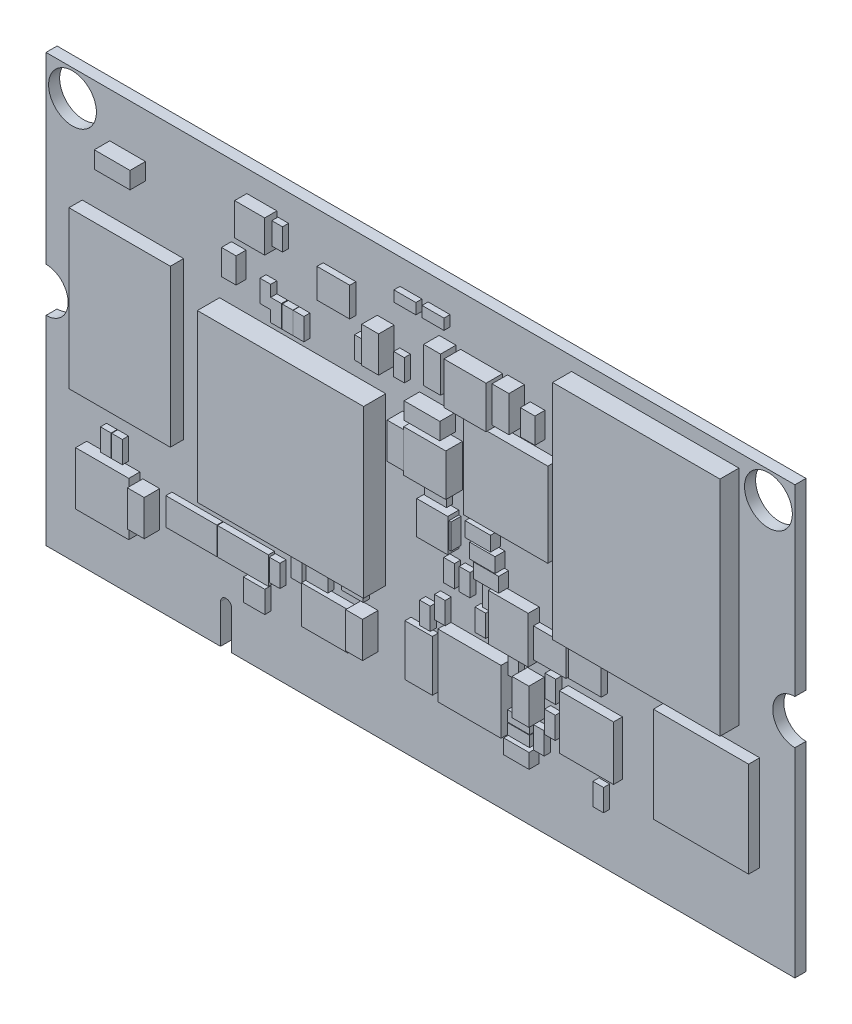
SolidWorks part; units mm, degrees
ref_plane "Front Plane" through (0, 0, 0) normal (0, 0, 1) x (1, 0, 0)
ref_plane "Top Plane" through (0, 0, 0) normal (0, 1, 0) x (1, 0, 0)
ref_plane "Right Plane" through (0, 0, 0) normal (1, 0, 0) x (0, 0, -1)
sketch "BOARD" plane through (0, 0, 0) normal (0, 0, 1) x (1, 0, 0)
  line L0 (0, 18.001) -> (0, 0)
  line L1 (0, 0) -> (15.7505, 0)
  line L2 (15.7505, 0) -> (15.7505, 3.5014)
  line L3 (16.7488, 3.5014) -> (16.7488, 0)
  line L4 (16.7488, 0) -> (67.5996, 0)
  line L5 (67.5996, 0) -> (67.5996, 18.001)
  line L6 (67.5996, 21.9989) -> (67.5996, 38.5572)
  line L7 (67.5996, 38.5572) -> (0, 38.5572)
  line L8 (0, 38.5572) -> (0, 21.9989)
  line L9 (0, 18.001) -> (0, 0)
  line L10 (0, 0) -> (15.7505, 0)
  line L11 (15.7505, 0) -> (15.7505, 3.5014)
  line L12 (16.7488, 3.5014) -> (16.7488, 0)
  line L13 (16.7488, 0) -> (67.5996, 0)
  line L14 (67.5996, 0) -> (67.5996, 18.001)
  line L15 (67.5996, 21.9989) -> (67.5996, 38.5572)
  line L16 (67.5996, 38.5572) -> (0, 38.5572)
  line L17 (0, 38.5572) -> (0, 21.9989)
  line L18 (0, 38.5572) -> (67.5996, 38.5572)
  line L19 (67.5996, 38.5572) -> (67.5996, 21.9989)
  line L20 (67.5996, 18.001) -> (67.5996, 0)
  line L21 (67.5996, 0) -> (16.7488, 0)
  line L22 (16.7488, 0) -> (16.7488, 3.5014)
  line L23 (15.7505, 3.5014) -> (15.7505, 0)
  line L24 (15.7505, 0) -> (0, 0)
  line L25 (0, 0) -> (0, 18.001)
  line L26 (0, 21.9989) -> (0, 38.5572)
  arc A0 (1.999, 20) -> (0, 18.001) centre (0, 20) cw
  arc A1 (15.7505, 3.5014) -> (16.2509, 4.0005) centre (16.2496, 3.5014) cw
  arc A2 (16.2509, 4.0005) -> (16.7488, 3.5014) centre (16.2496, 3.5014) cw
  arc A3 (67.5996, 18.001) -> (65.6006, 20) centre (67.5996, 20) cw
  arc A4 (65.6006, 20) -> (67.5996, 21.9989) centre (67.5996, 20) cw
  arc A5 (0, 21.9989) -> (1.999, 20) centre (0, 20) cw
  arc A6 (1.999, 20) -> (0, 18.001) centre (0, 20) cw
  arc A7 (15.7505, 3.5014) -> (16.2509, 4.0005) centre (16.2496, 3.5014) cw
  arc A8 (16.2509, 4.0005) -> (16.7488, 3.5014) centre (16.2496, 3.5014) cw
  arc A9 (67.5996, 18.001) -> (65.6006, 20) centre (67.5996, 20) cw
  arc A10 (65.6006, 20) -> (67.5996, 21.9989) centre (67.5996, 20) cw
  arc A11 (0, 21.9989) -> (1.999, 20) centre (0, 20) cw
  arc A12 (0, 21.9989) -> (0, 18.001) centre (0, 20) cw
  arc A13 (15.7505, 3.5014) -> (16.7488, 3.5014) centre (16.2496, 3.5014) cw
  arc A14 (67.5996, 21.9989) -> (67.5996, 18.001) centre (67.5996, 20) ccw
ref_plane "Plane1" through (0, 0, 0.955) normal (0, 0, 1) x (1, 0, 0)
sketch "Sketch236" plane through (0, 0, 0.955) normal (0, 0, 1) x (1, 0, 0)
  line L0 (0, 38.5572) -> (0, 21.9989)
  line L1 (0, 18.001) -> (0, 0)
  line L2 (0, 0) -> (15.7505, 0)
  line L3 (15.7505, 0) -> (15.7505, 3.5014)
  line L4 (16.7488, 3.5014) -> (16.7488, 0)
  line L5 (16.7488, 0) -> (67.5996, 0)
  line L6 (67.5996, 0) -> (67.5996, 18.001)
  line L7 (0, 38.5572) -> (67.5996, 38.5572)
  line L8 (67.5996, 38.5572) -> (67.5996, 21.9989)
  arc A0 (67.5996, 21.9989) -> (67.5996, 18.001) centre (67.5996, 20) ccw
  arc A1 (0, 21.9989) -> (0, 18.001) centre (0, 20) cw
  arc A2 (15.7505, 3.5014) -> (16.7488, 3.5014) centre (16.2496, 3.5014) cw
sketch "Sketch2" plane through (0, 0, 0.955) normal (0, 0, 1) x (1, 0, 0)
  line L0 (47.4386, 17.2255) -> (47.4386, 37.3337)
  line L1 (47.4386, 37.3337) -> (62.5465, 37.3337)
  line L2 (62.5465, 37.3337) -> (62.5465, 17.2255)
  line L3 (62.5465, 17.2255) -> (47.4386, 17.2255)
extrude "TIWI_R2NTP-1" add sketch "Sketch2" along normal blind 1.713 separate body
sketch "Sketch3" plane through (0, 0, 0.955) normal (0, 0, 1) x (1, 0, 0)
  line L0 (44.5229, 13.2669) -> (40.9227, 13.2669)
  line L1 (40.9227, 13.2669) -> (40.9227, 17.4671)
  line L2 (40.9227, 17.4671) -> (44.5229, 17.4671)
  line L3 (44.5229, 17.4671) -> (44.5229, 13.2669)
extrude "ABM8_32X25-1" add sketch "Sketch3" along normal blind 1 separate body
sketch "Sketch4" plane through (0, 0, 0) normal (0, 0, 1) x (1, 0, 0)
  line L0 (28.1178, 33.9039) -> (30.7594, 33.9039)
  line L1 (30.7594, 33.9039) -> (30.7594, 36.8605)
  line L2 (30.7594, 36.8605) -> (28.1178, 36.8605)
  line L3 (28.1178, 36.8605) -> (28.1178, 33.9039)
extrude "RN8R0805-1" add sketch "Sketch4" against normal blind 0.5588 separate body
sketch "Sketch5" plane through (0, 0, 0.955) normal (0, 0, 1) x (1, 0, 0)
  line L0 (50.6755, 16.4084) -> (50.6755, 13.7668)
  line L1 (50.6755, 13.7668) -> (47.719, 13.7668)
  line L2 (47.719, 13.7668) -> (47.719, 16.4084)
  line L3 (47.719, 16.4084) -> (50.6755, 16.4084)
extrude "RN8R0805-2" add sketch "Sketch5" along normal blind 0.5588 separate body
sketch "Sketch6" plane through (0, 0, 0.955) normal (0, 0, 1) x (1, 0, 0)
  line L0 (25.0165, 31.9786) -> (25.0165, 34.6202)
  line L1 (25.0165, 34.6202) -> (27.973, 34.6202)
  line L2 (27.973, 34.6202) -> (27.973, 31.9786)
  line L3 (27.973, 31.9786) -> (25.0165, 31.9786)
extrude "RN8R0805-3" add sketch "Sketch6" along normal blind 0.5588 separate body
sketch "Sketch7" plane through (0, 0, 0.955) normal (0, 0, 1) x (1, 0, 0)
  line L0 (44.5491, 13.6398) -> (44.5491, 16.2814)
  line L1 (44.5491, 16.2814) -> (47.5056, 16.2814)
  line L2 (47.5056, 16.2814) -> (47.5056, 13.6398)
  line L3 (47.5056, 13.6398) -> (44.5491, 13.6398)
extrude "RN8R0805-4" add sketch "Sketch7" along normal blind 0.5588 separate body
sketch "Sketch8" plane through (0, 0, 0) normal (0, 0, 1) x (1, 0, 0)
  line L0 (62.8142, 21.4097) -> (65.4558, 21.4097)
  line L1 (65.4558, 21.4097) -> (65.4558, 24.3662)
  line L2 (65.4558, 24.3662) -> (62.8142, 24.3662)
  line L3 (62.8142, 24.3662) -> (62.8142, 21.4097)
extrude "RN8R0805-5" add sketch "Sketch8" against normal blind 0.5588 separate body
sketch "Sketch9" plane through (0, 0, 0.955) normal (0, 0, 1) x (1, 0, 0)
  line L0 (12.4206, 28.6512) -> (12.4206, 14.5014)
  line L1 (12.4206, 14.5014) -> (3.2705, 14.5014)
  line L2 (3.2705, 14.5014) -> (3.2705, 28.6512)
  line L3 (3.2705, 28.6512) -> (12.4206, 28.6512)
extrude "BGA96_0P8_9P15X14P15-1" add sketch "Sketch9" along normal blind 1.1999 separate body
sketch "Sketch10" plane through (0, 0, 0) normal (0, 0, 1) x (1, 0, 0)
  line L0 (38.0136, 31.2849) -> (40.9296, 31.2849)
  line L1 (40.9296, 31.2849) -> (40.9296, 33.9931)
  line L2 (40.9296, 33.9931) -> (38.0136, 33.9931)
  line L3 (38.0136, 33.9931) -> (38.0136, 31.2849)
extrude "SC705-1" add sketch "Sketch10" against normal blind 1.1001 separate body
sketch "Sketch11" plane through (0, 0, 0.955) normal (0, 0, 1) x (1, 0, 0)
  line L0 (20.8359, 36.5862) -> (20.8359, 33.6702)
  line L1 (20.8359, 33.6702) -> (18.1277, 33.6702)
  line L2 (18.1277, 33.6702) -> (18.1277, 36.5862)
  line L3 (18.1277, 36.5862) -> (20.8359, 36.5862)
extrude "SC705-2" add sketch "Sketch11" along normal blind 1.1001 separate body
sketch "Sketch12" plane through (0, 0, 0.955) normal (0, 0, 1) x (1, 0, 0)
  line L0 (36.1442, 21.0312) -> (36.1442, 18.7452)
  line L1 (36.1442, 18.7452) -> (37.465, 18.7452)
  line L2 (37.465, 18.7452) -> (37.465, 21.0312)
  line L3 (37.465, 21.0312) -> (36.1442, 21.0312)
extrude "R0603-1" add sketch "Sketch12" along normal blind 0.8999 separate body
sketch "Sketch13" plane through (0, 0, 0.955) normal (0, 0, 1) x (1, 0, 0)
  line L0 (34.4648, 18.4135) -> (34.4648, 21.4137)
  line L1 (34.4648, 21.4137) -> (37.2648, 21.4137)
  line L2 (37.2648, 21.4137) -> (37.2648, 18.4135)
  line L3 (37.2648, 18.4135) -> (34.4648, 18.4135)
extrude "SC-70-6-1" add sketch "Sketch13" along normal blind 1 separate body
sketch "Sketch14" plane through (0, 0, 0.955) normal (0, 0, 1) x (1, 0, 0)
  circle A0 centre (65.2094, 36.1518) radius 2.159
sketch "Sketch15" plane through (0, 0, 0.955) normal (0, 0, 1) x (1, 0, 0)
  circle A0 centre (2.3901, 36.1518) radius 2.159
sketch "Sketch17" plane through (0, 0, 0.955) normal (0, 0, 1) x (1, 0, 0)
  line L0 (52.0258, 7.7404) -> (47.1358, 7.7404)
  line L1 (47.1358, 7.7404) -> (47.1358, 12.6304)
  line L2 (47.1358, 12.6304) -> (52.0258, 12.6304)
  line L3 (52.0258, 12.6304) -> (52.0258, 7.7404)
extrude "QFN24_TXS02612RTWR-1" add sketch "Sketch17" along normal blind 0.8001 separate body
sketch "Sketch18" plane through (0, 0, 0) normal (0, 0, 1) x (1, 0, 0)
  line L0 (36.4089, 36.1772) -> (32.0187, 36.1772)
  line L1 (32.0187, 36.1772) -> (32.0187, 31.7871)
  line L2 (32.0187, 31.7871) -> (36.4089, 31.7871)
  line L3 (36.4089, 31.7871) -> (36.4089, 36.1772)
extrude "TXB0104RGYR-1" add sketch "Sketch18" against normal blind 1 separate body
sketch "Sketch19" plane through (0, 0, 0.955) normal (0, 0, 1) x (1, 0, 0)
  line L0 (42.1691, 12.2733) -> (42.1691, 6.5735)
  line L1 (42.1691, 6.5735) -> (36.4693, 6.5735)
  line L2 (36.4693, 6.5735) -> (36.4693, 12.2733)
  line L3 (36.4693, 12.2733) -> (42.1691, 12.2733)
extrude "32PINMLF5X5-1" add sketch "Sketch19" along normal blind 1.1001 separate body
sketch "Sketch20" plane through (0, 0, 0.955) normal (0, 0, 1) x (1, 0, 0)
  line L0 (8.4706, 5.1946) -> (8.4706, 9.9946)
  line L1 (8.4706, 9.9946) -> (3.6706, 9.9946)
  line L2 (3.6706, 9.9946) -> (3.6706, 5.1946)
  line L3 (3.6706, 5.1946) -> (8.4706, 5.1946)
extrude "SON-10-TPS51200-1" add sketch "Sketch20" along normal blind 1 separate body
sketch "Sketch21" plane through (0, 0, 0.955) normal (0, 0, 1) x (1, 0, 0)
  line L0 (44.9834, 8.9789) -> (43.4594, 8.9789)
  line L1 (43.4594, 8.9789) -> (43.4594, 12.2047)
  line L2 (43.4594, 12.2047) -> (44.9834, 12.2047)
  line L3 (44.9834, 12.2047) -> (44.9834, 8.9789)
extrude "C0805-1" add sketch "Sketch21" along normal blind 1.397 separate body
sketch "Sketch22" plane through (0, 0, 0) normal (0, 0, 1) x (1, 0, 0)
  line L0 (4.8514, 9.3599) -> (3.3274, 9.3599)
  line L1 (3.3274, 9.3599) -> (3.3274, 6.1341)
  line L2 (3.3274, 6.1341) -> (4.8514, 6.1341)
  line L3 (4.8514, 6.1341) -> (4.8514, 9.3599)
extrude "C0805-2" add sketch "Sketch22" against normal blind 1.397 separate body
sketch "Sketch23" plane through (0, 0, 0.955) normal (0, 0, 1) x (1, 0, 0)
  line L0 (8.7376, 9.5885) -> (10.2616, 9.5885)
  line L1 (10.2616, 9.5885) -> (10.2616, 6.3627)
  line L2 (10.2616, 6.3627) -> (8.7376, 6.3627)
  line L3 (8.7376, 6.3627) -> (8.7376, 9.5885)
extrude "C0805-3" add sketch "Sketch23" along normal blind 1.397 separate body
sketch "Sketch24" plane through (0, 0, 0.955) normal (0, 0, 1) x (1, 0, 0)
  line L0 (8.9789, 34.5186) -> (8.9789, 32.9946)
  line L1 (8.9789, 32.9946) -> (5.7531, 32.9946)
  line L2 (5.7531, 32.9946) -> (5.7531, 34.5186)
  line L3 (5.7531, 34.5186) -> (8.9789, 34.5186)
extrude "C0805-4" add sketch "Sketch24" along normal blind 1.397 separate body
sketch "Sketch25" plane through (0, 0, 0.955) normal (0, 0, 1) x (1, 0, 0)
  line L0 (36.9443, 28.8798) -> (36.9443, 27.3558)
  line L1 (36.9443, 27.3558) -> (33.7185, 27.3558)
  line L2 (33.7185, 27.3558) -> (33.7185, 28.8798)
  line L3 (33.7185, 28.8798) -> (36.9443, 28.8798)
extrude "C0805-5" add sketch "Sketch25" along normal blind 1.397 separate body
sketch "Sketch26" plane through (0, 0, 0.955) normal (0, 0, 1) x (1, 0, 0)
  line L0 (43.18, 30.9499) -> (41.656, 30.9499)
  line L1 (41.656, 30.9499) -> (41.656, 34.1757)
  line L2 (41.656, 34.1757) -> (43.18, 34.1757)
  line L3 (43.18, 34.1757) -> (43.18, 30.9499)
extrude "C0805-6" add sketch "Sketch26" along normal blind 1.397 separate body
sketch "Sketch27" plane through (0, 0, 0.955) normal (0, 0, 1) x (1, 0, 0)
  line L0 (37.0078, 30.9499) -> (35.4838, 30.9499)
  line L1 (35.4838, 30.9499) -> (35.4838, 34.1757)
  line L2 (35.4838, 34.1757) -> (37.0078, 34.1757)
  line L3 (37.0078, 34.1757) -> (37.0078, 30.9499)
extrude "C0805-7" add sketch "Sketch27" along normal blind 1.397 separate body
sketch "Sketch28" plane through (0, 0, 0) normal (0, 0, 1) x (1, 0, 0)
  line L0 (54.1147, 23.1902) -> (54.1147, 21.6662)
  line L1 (54.1147, 21.6662) -> (57.3405, 21.6662)
  line L2 (57.3405, 21.6662) -> (57.3405, 23.1902)
  line L3 (57.3405, 23.1902) -> (54.1147, 23.1902)
extrude "C0805-8" add sketch "Sketch28" against normal blind 1.397 separate body
sketch "Sketch29" plane through (0, 0, 0) normal (0, 0, 1) x (1, 0, 0)
  line L0 (55.8927, 17.6022) -> (55.8927, 16.0782)
  line L1 (55.8927, 16.0782) -> (59.1185, 16.0782)
  line L2 (59.1185, 16.0782) -> (59.1185, 17.6022)
  line L3 (59.1185, 17.6022) -> (55.8927, 17.6022)
extrude "C0805-9" add sketch "Sketch29" against normal blind 1.397 separate body
sketch "Sketch30" plane through (0, 0, 0) normal (0, 0, 1) x (1, 0, 0)
  line L0 (63.2333, 7.1374) -> (63.2333, 8.6614)
  line L1 (63.2333, 8.6614) -> (60.0075, 8.6614)
  line L2 (60.0075, 8.6614) -> (60.0075, 7.1374)
  line L3 (60.0075, 7.1374) -> (63.2333, 7.1374)
extrude "C0805-10" add sketch "Sketch30" against normal blind 1.397 separate body
sketch "Sketch31" plane through (0, 0, 0) normal (0, 0, 1) x (1, 0, 0)
  line L0 (64.0969, 16.1544) -> (64.0969, 17.6784)
  line L1 (64.0969, 17.6784) -> (60.8711, 17.6784)
  line L2 (60.8711, 17.6784) -> (60.8711, 16.1544)
  line L3 (60.8711, 16.1544) -> (64.0969, 16.1544)
extrude "C0805-11" add sketch "Sketch31" against normal blind 1.397 separate body
sketch "Sketch32" plane through (0, 0, 0) normal (0, 0, 1) x (1, 0, 0)
  line L0 (13.1699, 32.4866) -> (13.1699, 30.9626)
  line L1 (13.1699, 30.9626) -> (16.3957, 30.9626)
  line L2 (16.3957, 30.9626) -> (16.3957, 32.4866)
  line L3 (16.3957, 32.4866) -> (13.1699, 32.4866)
extrude "C0805-12" add sketch "Sketch32" against normal blind 1.397 separate body
sketch "Sketch33" plane through (0, 0, 0) normal (0, 0, 1) x (1, 0, 0)
  line L0 (34.1884, 26.7081) -> (32.6644, 26.7081)
  line L1 (32.6644, 26.7081) -> (32.6644, 23.4823)
  line L2 (32.6644, 23.4823) -> (34.1884, 23.4823)
  line L3 (34.1884, 23.4823) -> (34.1884, 26.7081)
extrude "C0805-13" add sketch "Sketch33" against normal blind 1.397 separate body
sketch "Sketch34" plane through (0, 0, 0.955) normal (0, 0, 1) x (1, 0, 0)
  line L0 (29.972, 6.6929) -> (28.448, 6.6929)
  line L1 (28.448, 6.6929) -> (28.448, 9.9187)
  line L2 (28.448, 9.9187) -> (29.972, 9.9187)
  line L3 (29.972, 9.9187) -> (29.972, 6.6929)
extrude "C0805-14" add sketch "Sketch34" along normal blind 1.397 separate body
sketch "Sketch35" plane through (0, 0, 0.955) normal (0, 0, 1) x (1, 0, 0)
  line L0 (29.8958, 32.9565) -> (31.4198, 32.9565)
  line L1 (31.4198, 32.9565) -> (31.4198, 29.7307)
  line L2 (31.4198, 29.7307) -> (29.8958, 29.7307)
  line L3 (29.8958, 29.7307) -> (29.8958, 32.9565)
extrude "C0805-15" add sketch "Sketch35" along normal blind 1.397 separate body
sketch "Sketch36" plane through (0, 0, 0) normal (0, 0, 1) x (1, 0, 0)
  line L0 (31.1658, 32.7533) -> (29.6418, 32.7533)
  line L1 (29.6418, 32.7533) -> (29.6418, 29.5275)
  line L2 (29.6418, 29.5275) -> (31.1658, 29.5275)
  line L3 (31.1658, 29.5275) -> (31.1658, 32.7533)
extrude "C0805-16" add sketch "Sketch36" against normal blind 1.397 separate body
sketch "Sketch37" plane through (0, 0, 0) normal (0, 0, 1) x (1, 0, 0)
  line L0 (51.4223, 18.415) -> (51.4223, 19.939)
  line L1 (51.4223, 19.939) -> (48.1965, 19.939)
  line L2 (48.1965, 19.939) -> (48.1965, 18.415)
  line L3 (48.1965, 18.415) -> (51.4223, 18.415)
extrude "C0805-17" add sketch "Sketch37" against normal blind 1.397 separate body
sketch "Sketch38" plane through (0, 0, 0) normal (0, 0, 1) x (1, 0, 0)
  line L0 (47.5488, 21.7805) -> (46.0248, 21.7805)
  line L1 (46.0248, 21.7805) -> (46.0248, 18.5547)
  line L2 (46.0248, 18.5547) -> (47.5488, 18.5547)
  line L3 (47.5488, 18.5547) -> (47.5488, 21.7805)
extrude "C0805-18" add sketch "Sketch38" against normal blind 1.397 separate body
sketch "Sketch39" plane through (0, 0, 0.955) normal (0, 0, 1) x (1, 0, 0)
  line L0 (33.7058, 23.3807) -> (32.1818, 23.3807)
  line L1 (32.1818, 23.3807) -> (32.1818, 26.6065)
  line L2 (32.1818, 26.6065) -> (33.7058, 26.6065)
  line L3 (33.7058, 26.6065) -> (33.7058, 23.3807)
extrude "C0805-19" add sketch "Sketch39" along normal blind 1.397 separate body
sketch "Sketch40" plane through (0, 0, 0) normal (0, 0, 1) x (1, 0, 0)
  line L0 (28.7147, 9.652) -> (28.7147, 11.176)
  line L1 (28.7147, 11.176) -> (25.4889, 11.176)
  line L2 (25.4889, 11.176) -> (25.4889, 9.652)
  line L3 (25.4889, 9.652) -> (28.7147, 9.652)
extrude "C0805-20" add sketch "Sketch40" against normal blind 1.397 separate body
sketch "Sketch41" plane through (0, 0, 0) normal (0, 0, 1) x (1, 0, 0)
  line L0 (51.7271, 35.1536) -> (51.7271, 33.6296)
  line L1 (51.7271, 33.6296) -> (54.9529, 33.6296)
  line L2 (54.9529, 33.6296) -> (54.9529, 35.1536)
  line L3 (54.9529, 35.1536) -> (51.7271, 35.1536)
extrude "C0805-21" add sketch "Sketch41" against normal blind 1.397 separate body
sketch "Sketch42" plane through (0, 0, 0) normal (0, 0, 1) x (1, 0, 0)
  line L0 (49.8406, 25.128) -> (47.3908, 25.128)
  line L1 (47.3908, 25.128) -> (47.3908, 29.228)
  line L2 (47.3908, 29.228) -> (49.8406, 29.228)
  line L3 (49.8406, 29.228) -> (49.8406, 25.128)
extrude "Y_FC135-1" add sketch "Sketch42" against normal blind 0.8999 separate body
sketch "Sketch43" plane through (0, 0, 0.955) normal (0, 0, 1) x (1, 0, 0)
  line L0 (34.2646, 13.1572) -> (35.2298, 13.1572)
  line L1 (35.2298, 13.1572) -> (35.2298, 11.176)
  line L2 (35.2298, 11.176) -> (34.2646, 11.176)
  line L3 (34.2646, 11.176) -> (34.2646, 13.1572)
extrude "R0402-1" add sketch "Sketch43" along normal blind 0.5499 separate body
sketch "Sketch44" plane through (0, 0, 0.955) normal (0, 0, 1) x (1, 0, 0)
  line L0 (20.828, 29.1338) -> (19.8628, 29.1338)
  line L1 (19.8628, 29.1338) -> (19.8628, 31.115)
  line L2 (19.8628, 31.115) -> (20.828, 31.115)
  line L3 (20.828, 31.115) -> (20.828, 29.1338)
extrude "R0402-2" add sketch "Sketch44" along normal blind 0.5499 separate body
sketch "Sketch45" plane through (0, 0, 0.955) normal (0, 0, 1) x (1, 0, 0)
  line L0 (22.8346, 28.1178) -> (21.8694, 28.1178)
  line L1 (21.8694, 28.1178) -> (21.8694, 30.099)
  line L2 (21.8694, 30.099) -> (22.8346, 30.099)
  line L3 (22.8346, 30.099) -> (22.8346, 28.1178)
extrude "R0402-3" add sketch "Sketch45" along normal blind 0.5499 separate body
sketch "Sketch46" plane through (0, 0, 0) normal (0, 0, 1) x (1, 0, 0)
  line L0 (47.0662, 31.877) -> (47.0662, 32.8422)
  line L1 (47.0662, 32.8422) -> (45.085, 32.8422)
  line L2 (45.085, 32.8422) -> (45.085, 31.877)
  line L3 (45.085, 31.877) -> (47.0662, 31.877)
extrude "R0402-4" add sketch "Sketch46" against normal blind 0.5499 separate body
sketch "Sketch47" plane through (0, 0, 0) normal (0, 0, 1) x (1, 0, 0)
  line L0 (21.8186, 29.083) -> (20.8534, 29.083)
  line L1 (20.8534, 29.083) -> (20.8534, 27.1018)
  line L2 (20.8534, 27.1018) -> (21.8186, 27.1018)
  line L3 (21.8186, 27.1018) -> (21.8186, 29.083)
extrude "R0402-5" add sketch "Sketch47" against normal blind 0.5499 separate body
sketch "Sketch48" plane through (0, 0, 0) normal (0, 0, 1) x (1, 0, 0)
  line L0 (49.0728, 32.8676) -> (49.0728, 33.8328)
  line L1 (49.0728, 33.8328) -> (47.0916, 33.8328)
  line L2 (47.0916, 33.8328) -> (47.0916, 32.8676)
  line L3 (47.0916, 32.8676) -> (49.0728, 32.8676)
extrude "R0402-6" add sketch "Sketch48" against normal blind 0.5499 separate body
sketch "Sketch49" plane through (0, 0, 0) normal (0, 0, 1) x (1, 0, 0)
  line L0 (47.0662, 32.8676) -> (47.0662, 33.8328)
  line L1 (47.0662, 33.8328) -> (45.085, 33.8328)
  line L2 (45.085, 33.8328) -> (45.085, 32.8676)
  line L3 (45.085, 32.8676) -> (47.0662, 32.8676)
extrude "R0402-7" add sketch "Sketch49" against normal blind 0.5499 separate body
sketch "Sketch50" plane through (0, 0, 0) normal (0, 0, 1) x (1, 0, 0)
  line L0 (49.0728, 31.877) -> (49.0728, 32.8422)
  line L1 (49.0728, 32.8422) -> (47.0916, 32.8422)
  line L2 (47.0916, 32.8422) -> (47.0916, 31.877)
  line L3 (47.0916, 31.877) -> (49.0728, 31.877)
extrude "R0402-8" add sketch "Sketch50" against normal blind 0.5499 separate body
sketch "Sketch51" plane through (0, 0, 0) normal (0, 0, 1) x (1, 0, 0)
  line L0 (15.6972, 20.9316) -> (15.6972, 21.8968)
  line L1 (15.6972, 21.8968) -> (13.716, 21.8968)
  line L2 (13.716, 21.8968) -> (13.716, 20.9316)
  line L3 (13.716, 20.9316) -> (15.6972, 20.9316)
extrude "R0402-9" add sketch "Sketch51" against normal blind 0.5499 separate body
sketch "Sketch52" plane through (0, 0, 0) normal (0, 0, 1) x (1, 0, 0)
  line L0 (15.7988, 25.2222) -> (15.7988, 26.1874)
  line L1 (15.7988, 26.1874) -> (13.8176, 26.1874)
  line L2 (13.8176, 26.1874) -> (13.8176, 25.2222)
  line L3 (13.8176, 25.2222) -> (15.7988, 25.2222)
extrude "R0402-10" add sketch "Sketch52" against normal blind 0.5499 separate body
sketch "Sketch53" plane through (0, 0, 0) normal (0, 0, 1) x (1, 0, 0)
  line L0 (15.7988, 24.2316) -> (15.7988, 25.1968)
  line L1 (15.7988, 25.1968) -> (13.8176, 25.1968)
  line L2 (13.8176, 25.1968) -> (13.8176, 24.2316)
  line L3 (13.8176, 24.2316) -> (15.7988, 24.2316)
extrude "R0402-11" add sketch "Sketch53" against normal blind 0.5499 separate body
sketch "Sketch54" plane through (0, 0, 0) normal (0, 0, 1) x (1, 0, 0)
  line L0 (11.4808, 30.2768) -> (10.5156, 30.2768)
  line L1 (10.5156, 30.2768) -> (10.5156, 28.2956)
  line L2 (10.5156, 28.2956) -> (11.4808, 28.2956)
  line L3 (11.4808, 28.2956) -> (11.4808, 30.2768)
extrude "R0402-12" add sketch "Sketch54" against normal blind 0.5499 separate body
sketch "Sketch55" plane through (0, 0, 0) normal (0, 0, 1) x (1, 0, 0)
  line L0 (13.589, 22.0472) -> (13.589, 23.0124)
  line L1 (13.589, 23.0124) -> (11.6078, 23.0124)
  line L2 (11.6078, 23.0124) -> (11.6078, 22.0472)
  line L3 (11.6078, 22.0472) -> (13.589, 22.0472)
extrude "R0402-13" add sketch "Sketch55" against normal blind 0.5499 separate body
sketch "Sketch56" plane through (0, 0, 0) normal (0, 0, 1) x (1, 0, 0)
  line L0 (3.1242, 26.2382) -> (2.159, 26.2382)
  line L1 (2.159, 26.2382) -> (2.159, 24.257)
  line L2 (2.159, 24.257) -> (3.1242, 24.257)
  line L3 (3.1242, 24.257) -> (3.1242, 26.2382)
extrude "R0402-14" add sketch "Sketch56" against normal blind 0.5499 separate body
sketch "Sketch57" plane through (0, 0, 0) normal (0, 0, 1) x (1, 0, 0)
  line L0 (7.493, 25.8826) -> (7.493, 24.9174)
  line L1 (7.493, 24.9174) -> (9.4742, 24.9174)
  line L2 (9.4742, 24.9174) -> (9.4742, 25.8826)
  line L3 (9.4742, 25.8826) -> (7.493, 25.8826)
extrude "R0402-15" add sketch "Sketch57" against normal blind 0.5499 separate body
sketch "Sketch58" plane through (0, 0, 0) normal (0, 0, 1) x (1, 0, 0)
  line L0 (7.493, 23.8506) -> (7.493, 22.8854)
  line L1 (7.493, 22.8854) -> (9.4742, 22.8854)
  line L2 (9.4742, 22.8854) -> (9.4742, 23.8506)
  line L3 (9.4742, 23.8506) -> (7.493, 23.8506)
extrude "R0402-16" add sketch "Sketch58" against normal blind 0.5499 separate body
sketch "Sketch59" plane through (0, 0, 0) normal (0, 0, 1) x (1, 0, 0)
  line L0 (7.493, 21.7678) -> (7.493, 20.8026)
  line L1 (7.493, 20.8026) -> (9.4742, 20.8026)
  line L2 (9.4742, 20.8026) -> (9.4742, 21.7678)
  line L3 (9.4742, 21.7678) -> (7.493, 21.7678)
extrude "R0402-17" add sketch "Sketch59" against normal blind 0.5499 separate body
sketch "Sketch60" plane through (0, 0, 0) normal (0, 0, 1) x (1, 0, 0)
  line L0 (7.493, 22.8092) -> (7.493, 21.844)
  line L1 (7.493, 21.844) -> (9.4742, 21.844)
  line L2 (9.4742, 21.844) -> (9.4742, 22.8092)
  line L3 (9.4742, 22.8092) -> (7.493, 22.8092)
extrude "R0402-18" add sketch "Sketch60" against normal blind 0.5499 separate body
sketch "Sketch61" plane through (0, 0, 0) normal (0, 0, 1) x (1, 0, 0)
  line L0 (13.589, 23.0378) -> (13.589, 24.003)
  line L1 (13.589, 24.003) -> (11.6078, 24.003)
  line L2 (11.6078, 24.003) -> (11.6078, 23.0378)
  line L3 (11.6078, 23.0378) -> (13.589, 23.0378)
extrude "R0402-19" add sketch "Sketch61" against normal blind 0.5499 separate body
sketch "Sketch62" plane through (0, 0, 0) normal (0, 0, 1) x (1, 0, 0)
  line L0 (2.159, 23.2156) -> (2.159, 22.2504)
  line L1 (2.159, 22.2504) -> (4.1402, 22.2504)
  line L2 (4.1402, 22.2504) -> (4.1402, 23.2156)
  line L3 (4.1402, 23.2156) -> (2.159, 23.2156)
extrude "R0402-20" add sketch "Sketch62" against normal blind 0.5499 separate body
sketch "Sketch63" plane through (0, 0, 0) normal (0, 0, 1) x (1, 0, 0)
  line L0 (7.493, 24.8666) -> (7.493, 23.9014)
  line L1 (7.493, 23.9014) -> (9.4742, 23.9014)
  line L2 (9.4742, 23.9014) -> (9.4742, 24.8666)
  line L3 (9.4742, 24.8666) -> (7.493, 24.8666)
extrude "R0402-21" add sketch "Sketch63" against normal blind 0.5499 separate body
sketch "Sketch64" plane through (0, 0, 0) normal (0, 0, 1) x (1, 0, 0)
  line L0 (6.4262, 30.3276) -> (5.461, 30.3276)
  line L1 (5.461, 30.3276) -> (5.461, 28.3464)
  line L2 (5.461, 28.3464) -> (6.4262, 28.3464)
  line L3 (6.4262, 28.3464) -> (6.4262, 30.3276)
extrude "R0402-22" add sketch "Sketch64" against normal blind 0.5499 separate body
sketch "Sketch65" plane through (0, 0, 0) normal (0, 0, 1) x (1, 0, 0)
  line L0 (10.4902, 30.2768) -> (9.525, 30.2768)
  line L1 (9.525, 30.2768) -> (9.525, 28.2956)
  line L2 (9.525, 28.2956) -> (10.4902, 28.2956)
  line L3 (10.4902, 28.2956) -> (10.4902, 30.2768)
extrude "R0402-23" add sketch "Sketch65" against normal blind 0.5499 separate body
sketch "Sketch66" plane through (0, 0, 0) normal (0, 0, 1) x (1, 0, 0)
  line L0 (7.3914, 27.178) -> (6.4262, 27.178)
  line L1 (6.4262, 27.178) -> (6.4262, 25.1968)
  line L2 (6.4262, 25.1968) -> (7.3914, 25.1968)
  line L3 (7.3914, 25.1968) -> (7.3914, 27.178)
extrude "R0402-24" add sketch "Sketch66" against normal blind 0.5499 separate body
sketch "Sketch67" plane through (0, 0, 0) normal (0, 0, 1) x (1, 0, 0)
  line L0 (5.4102, 30.3276) -> (4.445, 30.3276)
  line L1 (4.445, 30.3276) -> (4.445, 28.3464)
  line L2 (4.445, 28.3464) -> (5.4102, 28.3464)
  line L3 (5.4102, 28.3464) -> (5.4102, 30.3276)
extrude "R0402-25" add sketch "Sketch67" against normal blind 0.5499 separate body
sketch "Sketch68" plane through (0, 0, 0) normal (0, 0, 1) x (1, 0, 0)
  line L0 (6.4262, 22.1234) -> (7.3914, 22.1234)
  line L1 (7.3914, 22.1234) -> (7.3914, 24.1046)
  line L2 (7.3914, 24.1046) -> (6.4262, 24.1046)
  line L3 (6.4262, 24.1046) -> (6.4262, 22.1234)
extrude "R0402-26" add sketch "Sketch68" against normal blind 0.5499 separate body
sketch "Sketch69" plane through (0, 0, 0) normal (0, 0, 1) x (1, 0, 0)
  line L0 (7.493, 29.0068) -> (7.493, 28.0416)
  line L1 (7.493, 28.0416) -> (9.4742, 28.0416)
  line L2 (9.4742, 28.0416) -> (9.4742, 29.0068)
  line L3 (9.4742, 29.0068) -> (7.493, 29.0068)
extrude "R0402-27" add sketch "Sketch69" against normal blind 0.5499 separate body
sketch "Sketch70" plane through (0, 0, 0) normal (0, 0, 1) x (1, 0, 0)
  line L0 (4.4196, 30.3276) -> (3.4544, 30.3276)
  line L1 (3.4544, 30.3276) -> (3.4544, 28.3464)
  line L2 (3.4544, 28.3464) -> (4.4196, 28.3464)
  line L3 (4.4196, 28.3464) -> (4.4196, 30.3276)
extrude "R0402-28" add sketch "Sketch70" against normal blind 0.5499 separate body
sketch "Sketch71" plane through (0, 0, 0) normal (0, 0, 1) x (1, 0, 0)
  line L0 (13.5636, 29.0322) -> (12.5984, 29.0322)
  line L1 (12.5984, 29.0322) -> (12.5984, 27.051)
  line L2 (12.5984, 27.051) -> (13.5636, 27.051)
  line L3 (13.5636, 27.051) -> (13.5636, 29.0322)
extrude "R0402-29" add sketch "Sketch71" against normal blind 0.5499 separate body
sketch "Sketch72" plane through (0, 0, 0) normal (0, 0, 1) x (1, 0, 0)
  line L0 (2.159, 28.2956) -> (2.159, 27.3304)
  line L1 (2.159, 27.3304) -> (4.1402, 27.3304)
  line L2 (4.1402, 27.3304) -> (4.1402, 28.2956)
  line L3 (4.1402, 28.2956) -> (2.159, 28.2956)
extrude "R0402-30" add sketch "Sketch72" against normal blind 0.5499 separate body
sketch "Sketch73" plane through (0, 0, 0) normal (0, 0, 1) x (1, 0, 0)
  line L0 (13.5636, 26.0604) -> (13.5636, 27.0256)
  line L1 (13.5636, 27.0256) -> (11.5824, 27.0256)
  line L2 (11.5824, 27.0256) -> (11.5824, 26.0604)
  line L3 (11.5824, 26.0604) -> (13.5636, 26.0604)
extrude "R0402-31" add sketch "Sketch73" against normal blind 0.5499 separate body
sketch "Sketch74" plane through (0, 0, 0) normal (0, 0, 1) x (1, 0, 0)
  line L0 (2.159, 27.305) -> (2.159, 26.3398)
  line L1 (2.159, 26.3398) -> (4.1402, 26.3398)
  line L2 (4.1402, 26.3398) -> (4.1402, 27.305)
  line L3 (4.1402, 27.305) -> (2.159, 27.305)
extrude "R0402-32" add sketch "Sketch74" against normal blind 0.5499 separate body
sketch "Sketch75" plane through (0, 0, 0) normal (0, 0, 1) x (1, 0, 0)
  line L0 (12.5984, 24.0284) -> (13.5636, 24.0284)
  line L1 (13.5636, 24.0284) -> (13.5636, 26.0096)
  line L2 (13.5636, 26.0096) -> (12.5984, 26.0096)
  line L3 (12.5984, 26.0096) -> (12.5984, 24.0284)
extrude "R0402-33" add sketch "Sketch75" against normal blind 0.5499 separate body
sketch "Sketch76" plane through (0, 0, 0) normal (0, 0, 1) x (1, 0, 0)
  line L0 (7.493, 27.9908) -> (7.493, 27.0256)
  line L1 (7.493, 27.0256) -> (9.4742, 27.0256)
  line L2 (9.4742, 27.0256) -> (9.4742, 27.9908)
  line L3 (9.4742, 27.9908) -> (7.493, 27.9908)
extrude "R0402-34" add sketch "Sketch76" against normal blind 0.5499 separate body
sketch "Sketch77" plane through (0, 0, 0) normal (0, 0, 1) x (1, 0, 0)
  line L0 (7.3914, 29.2354) -> (6.4262, 29.2354)
  line L1 (6.4262, 29.2354) -> (6.4262, 27.2542)
  line L2 (6.4262, 27.2542) -> (7.3914, 27.2542)
  line L3 (7.3914, 27.2542) -> (7.3914, 29.2354)
extrude "R0402-35" add sketch "Sketch77" against normal blind 0.5499 separate body
sketch "Sketch78" plane through (0, 0, 0) normal (0, 0, 1) x (1, 0, 0)
  line L0 (7.493, 26.9494) -> (7.493, 25.9842)
  line L1 (7.493, 25.9842) -> (9.4742, 25.9842)
  line L2 (9.4742, 25.9842) -> (9.4742, 26.9494)
  line L3 (9.4742, 26.9494) -> (7.493, 26.9494)
extrude "R0402-36" add sketch "Sketch78" against normal blind 0.5499 separate body
sketch "Sketch79" plane through (0, 0, 0.955) normal (0, 0, 1) x (1, 0, 0)
  line L0 (7.4422, 10.3124) -> (6.477, 10.3124)
  line L1 (6.477, 10.3124) -> (6.477, 12.2936)
  line L2 (6.477, 12.2936) -> (7.4422, 12.2936)
  line L3 (7.4422, 12.2936) -> (7.4422, 10.3124)
extrude "R0402-37" add sketch "Sketch79" along normal blind 0.5499 separate body
sketch "Sketch80" plane through (0, 0, 0) normal (0, 0, 1) x (1, 0, 0)
  line L0 (4.1402, 23.2664) -> (4.1402, 24.2316)
  line L1 (4.1402, 24.2316) -> (2.159, 24.2316)
  line L2 (2.159, 24.2316) -> (2.159, 23.2664)
  line L3 (2.159, 23.2664) -> (4.1402, 23.2664)
extrude "R0402-38" add sketch "Sketch80" against normal blind 0.5499 separate body
sketch "Sketch81" plane through (0, 0, 0) normal (0, 0, 1) x (1, 0, 0)
  line L0 (30.988, 25.0952) -> (31.9532, 25.0952)
  line L1 (31.9532, 25.0952) -> (31.9532, 27.0764)
  line L2 (31.9532, 27.0764) -> (30.988, 27.0764)
  line L3 (30.988, 27.0764) -> (30.988, 25.0952)
extrude "R0402-39" add sketch "Sketch81" against normal blind 0.5499 separate body
sketch "Sketch82" plane through (0, 0, 0) normal (0, 0, 1) x (1, 0, 0)
  line L0 (33.8328, 21.4122) -> (33.8328, 22.3774)
  line L1 (33.8328, 22.3774) -> (31.8516, 22.3774)
  line L2 (31.8516, 22.3774) -> (31.8516, 21.4122)
  line L3 (31.8516, 21.4122) -> (33.8328, 21.4122)
extrude "R0402-40" add sketch "Sketch82" against normal blind 0.5499 separate body
sketch "Sketch83" plane through (0, 0, 0.955) normal (0, 0, 1) x (1, 0, 0)
  line L0 (36.703, 22.5552) -> (36.703, 21.59)
  line L1 (36.703, 21.59) -> (34.7218, 21.59)
  line L2 (34.7218, 21.59) -> (34.7218, 22.5552)
  line L3 (34.7218, 22.5552) -> (36.703, 22.5552)
extrude "R0402-41" add sketch "Sketch83" along normal blind 0.5499 separate body
sketch "Sketch84" plane through (0, 0, 0) normal (0, 0, 1) x (1, 0, 0)
  line L0 (52.5526, 33.274) -> (51.5874, 33.274)
  line L1 (51.5874, 33.274) -> (51.5874, 31.2928)
  line L2 (51.5874, 31.2928) -> (52.5526, 31.2928)
  line L3 (52.5526, 31.2928) -> (52.5526, 33.274)
extrude "R0402-42" add sketch "Sketch84" against normal blind 0.5499 separate body
sketch "Sketch85" plane through (0, 0, 0) normal (0, 0, 1) x (1, 0, 0)
  line L0 (29.3624, 28.0416) -> (29.3624, 27.0764)
  line L1 (29.3624, 27.0764) -> (31.3436, 27.0764)
  line L2 (31.3436, 27.0764) -> (31.3436, 28.0416)
  line L3 (31.3436, 28.0416) -> (29.3624, 28.0416)
extrude "R0402-43" add sketch "Sketch85" against normal blind 0.5499 separate body
sketch "Sketch86" plane through (0, 0, 0.955) normal (0, 0, 1) x (1, 0, 0)
  line L0 (36.449, 17.5768) -> (37.4142, 17.5768)
  line L1 (37.4142, 17.5768) -> (37.4142, 15.5956)
  line L2 (37.4142, 15.5956) -> (36.449, 15.5956)
  line L3 (36.449, 15.5956) -> (36.449, 17.5768)
extrude "R0402-44" add sketch "Sketch86" along normal blind 0.5499 separate body
sketch "Sketch87" plane through (0, 0, 0.955) normal (0, 0, 1) x (1, 0, 0)
  line L0 (46.5582, 11.1252) -> (45.593, 11.1252)
  line L1 (45.593, 11.1252) -> (45.593, 13.1064)
  line L2 (45.593, 13.1064) -> (46.5582, 13.1064)
  line L3 (46.5582, 13.1064) -> (46.5582, 11.1252)
extrude "R0402-45" add sketch "Sketch87" along normal blind 0.5499 separate body
sketch "Sketch88" plane through (0, 0, 0.955) normal (0, 0, 1) x (1, 0, 0)
  line L0 (44.5516, 8.5598) -> (45.5168, 8.5598)
  line L1 (45.5168, 8.5598) -> (45.5168, 6.5786)
  line L2 (45.5168, 6.5786) -> (44.5516, 6.5786)
  line L3 (44.5516, 6.5786) -> (44.5516, 8.5598)
extrude "R0402-46" add sketch "Sketch88" along normal blind 0.5499 separate body
sketch "Sketch89" plane through (0, 0, 0.955) normal (0, 0, 1) x (1, 0, 0)
  line L0 (40.2336, 13.1318) -> (39.2684, 13.1318)
  line L1 (39.2684, 13.1318) -> (39.2684, 15.113)
  line L2 (39.2684, 15.113) -> (40.2336, 15.113)
  line L3 (40.2336, 15.113) -> (40.2336, 13.1318)
extrude "R0402-47" add sketch "Sketch89" along normal blind 0.5499 separate body
sketch "Sketch90" plane through (0, 0, 0) normal (0, 0, 1) x (1, 0, 0)
  line L0 (21.6154, 13.2842) -> (21.6154, 12.319)
  line L1 (21.6154, 12.319) -> (23.5966, 12.319)
  line L2 (23.5966, 12.319) -> (23.5966, 13.2842)
  line L3 (23.5966, 13.2842) -> (21.6154, 13.2842)
extrude "R0402-48" add sketch "Sketch90" against normal blind 0.5499 separate body
sketch "Sketch91" plane through (0, 0, 0) normal (0, 0, 1) x (1, 0, 0)
  line L0 (29.718, 21.8694) -> (29.718, 20.9042)
  line L1 (29.718, 20.9042) -> (31.6992, 20.9042)
  line L2 (31.6992, 20.9042) -> (31.6992, 21.8694)
  line L3 (31.6992, 21.8694) -> (29.718, 21.8694)
extrude "R0402-49" add sketch "Sketch91" against normal blind 0.5499 separate body
sketch "Sketch92" plane through (0, 0, 0) normal (0, 0, 1) x (1, 0, 0)
  line L0 (8.763, 9.5758) -> (7.7978, 9.5758)
  line L1 (7.7978, 9.5758) -> (7.7978, 7.5946)
  line L2 (7.7978, 7.5946) -> (8.763, 7.5946)
  line L3 (8.763, 7.5946) -> (8.763, 9.5758)
extrude "R0402-50" add sketch "Sketch92" against normal blind 0.5499 separate body
sketch "Sketch93" plane through (0, 0, 0) normal (0, 0, 1) x (1, 0, 0)
  line L0 (28.3972, 28.9814) -> (29.3624, 28.9814)
  line L1 (29.3624, 28.9814) -> (29.3624, 30.9626)
  line L2 (29.3624, 30.9626) -> (28.3972, 30.9626)
  line L3 (28.3972, 30.9626) -> (28.3972, 28.9814)
extrude "R0402-51" add sketch "Sketch93" against normal blind 0.5499 separate body
sketch "Sketch94" plane through (0, 0, 0) normal (0, 0, 1) x (1, 0, 0)
  line L0 (19.7104, 29.0576) -> (18.7452, 29.0576)
  line L1 (18.7452, 29.0576) -> (18.7452, 27.0764)
  line L2 (18.7452, 27.0764) -> (19.7104, 27.0764)
  line L3 (19.7104, 27.0764) -> (19.7104, 29.0576)
extrude "R0402-52" add sketch "Sketch94" against normal blind 0.5499 separate body
sketch "Sketch95" plane through (0, 0, 0) normal (0, 0, 1) x (1, 0, 0)
  line L0 (5.7912, 9.5758) -> (5.7912, 8.6106)
  line L1 (5.7912, 8.6106) -> (7.7724, 8.6106)
  line L2 (7.7724, 8.6106) -> (7.7724, 9.5758)
  line L3 (7.7724, 9.5758) -> (5.7912, 9.5758)
extrude "R0402-53" add sketch "Sketch95" against normal blind 0.5499 separate body
sketch "Sketch96" plane through (0, 0, 0.955) normal (0, 0, 1) x (1, 0, 0)
  line L0 (24.003, 9.5504) -> (24.003, 10.5156)
  line L1 (24.003, 10.5156) -> (25.9842, 10.5156)
  line L2 (25.9842, 10.5156) -> (25.9842, 9.5504)
  line L3 (25.9842, 9.5504) -> (24.003, 9.5504)
extrude "R0402-54" add sketch "Sketch96" along normal blind 0.5499 separate body
sketch "Sketch97" plane through (0, 0, 0) normal (0, 0, 1) x (1, 0, 0)
  line L0 (17.6784, 29.0576) -> (16.7132, 29.0576)
  line L1 (16.7132, 29.0576) -> (16.7132, 27.0764)
  line L2 (16.7132, 27.0764) -> (17.6784, 27.0764)
  line L3 (17.6784, 27.0764) -> (17.6784, 29.0576)
extrude "R0402-55" add sketch "Sketch97" against normal blind 0.5499 separate body
sketch "Sketch98" plane through (0, 0, 0) normal (0, 0, 1) x (1, 0, 0)
  line L0 (39.624, 27.7368) -> (38.6588, 27.7368)
  line L1 (38.6588, 27.7368) -> (38.6588, 25.7556)
  line L2 (38.6588, 25.7556) -> (39.624, 25.7556)
  line L3 (39.624, 25.7556) -> (39.624, 27.7368)
extrude "R0402-56" add sketch "Sketch98" against normal blind 0.5499 separate body
sketch "Sketch99" plane through (0, 0, 0) normal (0, 0, 1) x (1, 0, 0)
  line L0 (43.1292, 32.512) -> (42.164, 32.512)
  line L1 (42.164, 32.512) -> (42.164, 30.5308)
  line L2 (42.164, 30.5308) -> (43.1292, 30.5308)
  line L3 (43.1292, 30.5308) -> (43.1292, 32.512)
extrude "R0402-57" add sketch "Sketch99" against normal blind 0.5499 separate body
sketch "Sketch100" plane through (0, 0, 0) normal (0, 0, 1) x (1, 0, 0)
  line L0 (16.4338, 5.3848) -> (16.4338, 6.35)
  line L1 (16.4338, 6.35) -> (14.4526, 6.35)
  line L2 (14.4526, 6.35) -> (14.4526, 5.3848)
  line L3 (14.4526, 5.3848) -> (16.4338, 5.3848)
extrude "R0402-58" add sketch "Sketch100" against normal blind 0.5499 separate body
sketch "Sketch101" plane through (0, 0, 0.955) normal (0, 0, 1) x (1, 0, 0)
  line L0 (19.3294, 7.0104) -> (20.2946, 7.0104)
  line L1 (20.2946, 7.0104) -> (20.2946, 5.0292)
  line L2 (20.2946, 5.0292) -> (19.3294, 5.0292)
  line L3 (19.3294, 5.0292) -> (19.3294, 7.0104)
extrude "R0402-59" add sketch "Sketch101" along normal blind 0.5499 separate body
sketch "Sketch102" plane through (0, 0, 0.955) normal (0, 0, 1) x (1, 0, 0)
  line L0 (18.3642, 7.0104) -> (19.3294, 7.0104)
  line L1 (19.3294, 7.0104) -> (19.3294, 5.0292)
  line L2 (19.3294, 5.0292) -> (18.3642, 5.0292)
  line L3 (18.3642, 5.0292) -> (18.3642, 7.0104)
extrude "R0402-60" add sketch "Sketch102" along normal blind 0.5499 separate body
sketch "Sketch103" plane through (0, 0, 0) normal (0, 0, 1) x (1, 0, 0)
  line L0 (63.9318, 20.2692) -> (62.9666, 20.2692)
  line L1 (62.9666, 20.2692) -> (62.9666, 18.288)
  line L2 (62.9666, 18.288) -> (63.9318, 18.288)
  line L3 (63.9318, 18.288) -> (63.9318, 20.2692)
extrude "R0402-61" add sketch "Sketch103" against normal blind 0.5499 separate body
sketch "Sketch104" plane through (0, 0, 0) normal (0, 0, 1) x (1, 0, 0)
  line L0 (62.0268, 20.2946) -> (61.0616, 20.2946)
  line L1 (61.0616, 20.2946) -> (61.0616, 18.3134)
  line L2 (61.0616, 18.3134) -> (62.0268, 18.3134)
  line L3 (62.0268, 18.3134) -> (62.0268, 20.2946)
extrude "R0402-62" add sketch "Sketch104" against normal blind 0.5499 separate body
sketch "Sketch105" plane through (0, 0, 0.955) normal (0, 0, 1) x (1, 0, 0)
  line L0 (29.3624, 28.9814) -> (28.3972, 28.9814)
  line L1 (28.3972, 28.9814) -> (28.3972, 30.9626)
  line L2 (28.3972, 30.9626) -> (29.3624, 30.9626)
  line L3 (29.3624, 30.9626) -> (29.3624, 28.9814)
extrude "R0402-63" add sketch "Sketch105" along normal blind 0.5499 separate body
sketch "Sketch106" plane through (0, 0, 0.955) normal (0, 0, 1) x (1, 0, 0)
  line L0 (20.701, 9.7282) -> (21.6662, 9.7282)
  line L1 (21.6662, 9.7282) -> (21.6662, 7.747)
  line L2 (21.6662, 7.747) -> (20.701, 7.747)
  line L3 (20.701, 7.747) -> (20.701, 9.7282)
extrude "R0402-64" add sketch "Sketch106" along normal blind 0.5499 separate body
sketch "Sketch107" plane through (0, 0, 0) normal (0, 0, 1) x (1, 0, 0)
  line L0 (31.623, 24.4856) -> (30.6578, 24.4856)
  line L1 (30.6578, 24.4856) -> (30.6578, 22.5044)
  line L2 (30.6578, 22.5044) -> (31.623, 22.5044)
  line L3 (31.623, 22.5044) -> (31.623, 24.4856)
extrude "C0402-1" add sketch "Sketch107" against normal blind 0.5499 separate body
sketch "Sketch108" plane through (0, 0, 0) normal (0, 0, 1) x (1, 0, 0)
  line L0 (25.9334, 15.1638) -> (26.8986, 15.1638)
  line L1 (26.8986, 15.1638) -> (26.8986, 17.145)
  line L2 (26.8986, 17.145) -> (25.9334, 17.145)
  line L3 (25.9334, 17.145) -> (25.9334, 15.1638)
extrude "C0402-2" add sketch "Sketch108" against normal blind 0.5499 separate body
sketch "Sketch109" plane through (0, 0, 0) normal (0, 0, 1) x (1, 0, 0)
  line L0 (21.9456, 20.2184) -> (21.9456, 19.2532)
  line L1 (21.9456, 19.2532) -> (23.9268, 19.2532)
  line L2 (23.9268, 19.2532) -> (23.9268, 20.2184)
  line L3 (23.9268, 20.2184) -> (21.9456, 20.2184)
extrude "C0402-3" add sketch "Sketch109" against normal blind 0.5499 separate body
sketch "Sketch110" plane through (0, 0, 0.955) normal (0, 0, 1) x (1, 0, 0)
  line L0 (42.2148, 7.5946) -> (42.2148, 8.5598)
  line L1 (42.2148, 8.5598) -> (44.196, 8.5598)
  line L2 (44.196, 8.5598) -> (44.196, 7.5946)
  line L3 (44.196, 7.5946) -> (42.2148, 7.5946)
extrude "C0402-4" add sketch "Sketch110" along normal blind 0.5499 separate body
sketch "Sketch111" plane through (0, 0, 0.955) normal (0, 0, 1) x (1, 0, 0)
  line L0 (40.894, 15.4432) -> (39.9288, 15.4432)
  line L1 (39.9288, 15.4432) -> (39.9288, 17.4244)
  line L2 (39.9288, 17.4244) -> (40.894, 17.4244)
  line L3 (40.894, 17.4244) -> (40.894, 15.4432)
extrude "C0402-5" add sketch "Sketch111" along normal blind 0.5499 separate body
sketch "Sketch112" plane through (0, 0, 0.955) normal (0, 0, 1) x (1, 0, 0)
  line L0 (42.2402, 13.2588) -> (43.2054, 13.2588)
  line L1 (43.2054, 13.2588) -> (43.2054, 11.2776)
  line L2 (43.2054, 11.2776) -> (42.2402, 11.2776)
  line L3 (42.2402, 11.2776) -> (42.2402, 13.2588)
extrude "C0402-6" add sketch "Sketch112" along normal blind 0.5499 separate body
sketch "Sketch113" plane through (0, 0, 0) normal (0, 0, 1) x (1, 0, 0)
  line L0 (15.6972, 19.9664) -> (15.6972, 20.9316)
  line L1 (15.6972, 20.9316) -> (13.716, 20.9316)
  line L2 (13.716, 20.9316) -> (13.716, 19.9664)
  line L3 (13.716, 19.9664) -> (15.6972, 19.9664)
extrude "C0402-7" add sketch "Sketch113" against normal blind 0.5499 separate body
sketch "Sketch114" plane through (0, 0, 0) normal (0, 0, 1) x (1, 0, 0)
  line L0 (15.6718, 18.9992) -> (15.6718, 19.9644)
  line L1 (15.6718, 19.9644) -> (13.6906, 19.9644)
  line L2 (13.6906, 19.9644) -> (13.6906, 18.9992)
  line L3 (13.6906, 18.9992) -> (15.6718, 18.9992)
extrude "C0402-8" add sketch "Sketch114" against normal blind 0.5499 separate body
sketch "Sketch115" plane through (0, 0, 0) normal (0, 0, 1) x (1, 0, 0)
  line L0 (13.8176, 27.2542) -> (13.8176, 26.289)
  line L1 (13.8176, 26.289) -> (15.7988, 26.289)
  line L2 (15.7988, 26.289) -> (15.7988, 27.2542)
  line L3 (15.7988, 27.2542) -> (13.8176, 27.2542)
extrude "C0402-9" add sketch "Sketch115" against normal blind 0.5499 separate body
sketch "Sketch116" plane through (0, 0, 0) normal (0, 0, 1) x (1, 0, 0)
  line L0 (12.573, 21.1836) -> (11.6078, 21.1836)
  line L1 (11.6078, 21.1836) -> (11.6078, 19.2024)
  line L2 (11.6078, 19.2024) -> (12.573, 19.2024)
  line L3 (12.573, 19.2024) -> (12.573, 21.1836)
extrude "C0402-10" add sketch "Sketch116" against normal blind 0.5499 separate body
sketch "Sketch117" plane through (0, 0, 0) normal (0, 0, 1) x (1, 0, 0)
  line L0 (12.5984, 17.0688) -> (11.6332, 17.0688)
  line L1 (11.6332, 17.0688) -> (11.6332, 15.0876)
  line L2 (11.6332, 15.0876) -> (12.5984, 15.0876)
  line L3 (12.5984, 15.0876) -> (12.5984, 17.0688)
extrude "C0402-11" add sketch "Sketch117" against normal blind 0.5499 separate body
sketch "Sketch118" plane through (0, 0, 0) normal (0, 0, 1) x (1, 0, 0)
  line L0 (4.1402, 26.2382) -> (3.175, 26.2382)
  line L1 (3.175, 26.2382) -> (3.175, 24.257)
  line L2 (3.175, 24.257) -> (4.1402, 24.257)
  line L3 (4.1402, 24.257) -> (4.1402, 26.2382)
extrude "C0402-12" add sketch "Sketch118" against normal blind 0.5499 separate body
sketch "Sketch119" plane through (0, 0, 0) normal (0, 0, 1) x (1, 0, 0)
  line L0 (17.3736, 17.653) -> (17.3736, 18.6182)
  line L1 (17.3736, 18.6182) -> (15.3924, 18.6182)
  line L2 (15.3924, 18.6182) -> (15.3924, 17.653)
  line L3 (15.3924, 17.653) -> (17.3736, 17.653)
extrude "C0402-13" add sketch "Sketch119" against normal blind 0.5499 separate body
sketch "Sketch120" plane through (0, 0, 0) normal (0, 0, 1) x (1, 0, 0)
  line L0 (19.431, 21.557) -> (19.431, 20.5918)
  line L1 (19.431, 20.5918) -> (21.4122, 20.5918)
  line L2 (21.4122, 20.5918) -> (21.4122, 21.557)
  line L3 (21.4122, 21.557) -> (19.431, 21.557)
extrude "C0402-14" add sketch "Sketch120" against normal blind 0.5499 separate body
sketch "Sketch121" plane through (0, 0, 0) normal (0, 0, 1) x (1, 0, 0)
  line L0 (5.4102, 25.1206) -> (5.4102, 24.1554)
  line L1 (5.4102, 24.1554) -> (7.3914, 24.1554)
  line L2 (7.3914, 24.1554) -> (7.3914, 25.1206)
  line L3 (7.3914, 25.1206) -> (5.4102, 25.1206)
extrude "C0402-15" add sketch "Sketch121" against normal blind 0.5499 separate body
sketch "Sketch122" plane through (0, 0, 0) normal (0, 0, 1) x (1, 0, 0)
  line L0 (11.6078, 24.0284) -> (12.573, 24.0284)
  line L1 (12.573, 24.0284) -> (12.573, 26.0096)
  line L2 (12.573, 26.0096) -> (11.6078, 26.0096)
  line L3 (11.6078, 26.0096) -> (11.6078, 24.0284)
extrude "C0402-16" add sketch "Sketch122" against normal blind 0.5499 separate body
sketch "Sketch123" plane through (0, 0, 0) normal (0, 0, 1) x (1, 0, 0)
  line L0 (11.5824, 27.051) -> (12.5476, 27.051)
  line L1 (12.5476, 27.051) -> (12.5476, 29.0322)
  line L2 (12.5476, 29.0322) -> (11.5824, 29.0322)
  line L3 (11.5824, 29.0322) -> (11.5824, 27.051)
extrude "C0402-17" add sketch "Sketch123" against normal blind 0.5499 separate body
sketch "Sketch124" plane through (0, 0, 0) normal (0, 0, 1) x (1, 0, 0)
  line L0 (3.0734, 19.0754) -> (4.0386, 19.0754)
  line L1 (4.0386, 19.0754) -> (4.0386, 21.0566)
  line L2 (4.0386, 21.0566) -> (3.0734, 21.0566)
  line L3 (3.0734, 21.0566) -> (3.0734, 19.0754)
extrude "C0402-18" add sketch "Sketch124" against normal blind 0.5499 separate body
sketch "Sketch125" plane through (0, 0, 0.955) normal (0, 0, 1) x (1, 0, 0)
  line L0 (6.4262, 10.3124) -> (5.461, 10.3124)
  line L1 (5.461, 10.3124) -> (5.461, 12.2936)
  line L2 (5.461, 12.2936) -> (6.4262, 12.2936)
  line L3 (6.4262, 12.2936) -> (6.4262, 10.3124)
extrude "C0402-19" add sketch "Sketch125" along normal blind 0.5499 separate body
sketch "Sketch126" plane through (0, 0, 0) normal (0, 0, 1) x (1, 0, 0)
  line L0 (4.0386, 19.0246) -> (3.0734, 19.0246)
  line L1 (3.0734, 19.0246) -> (3.0734, 17.0434)
  line L2 (3.0734, 17.0434) -> (4.0386, 17.0434)
  line L3 (4.0386, 17.0434) -> (4.0386, 19.0246)
extrude "C0402-20" add sketch "Sketch126" against normal blind 0.5499 separate body
sketch "Sketch127" plane through (0, 0, 0.955) normal (0, 0, 1) x (1, 0, 0)
  line L0 (21.8948, 34.163) -> (20.9296, 34.163)
  line L1 (20.9296, 34.163) -> (20.9296, 36.1442)
  line L2 (20.9296, 36.1442) -> (21.8948, 36.1442)
  line L3 (21.8948, 36.1442) -> (21.8948, 34.163)
extrude "C0402-21" add sketch "Sketch127" along normal blind 0.5499 separate body
sketch "Sketch128" plane through (0, 0, 0.955) normal (0, 0, 1) x (1, 0, 0)
  line L0 (38.8112, 15.5956) -> (37.846, 15.5956)
  line L1 (37.846, 15.5956) -> (37.846, 17.5768)
  line L2 (37.846, 17.5768) -> (38.8112, 17.5768)
  line L3 (38.8112, 17.5768) -> (38.8112, 15.5956)
extrude "C0402-22" add sketch "Sketch128" along normal blind 0.5499 separate body
sketch "Sketch129" plane through (0, 0, 0.955) normal (0, 0, 1) x (1, 0, 0)
  line L0 (36.576, 12.2936) -> (35.6108, 12.2936)
  line L1 (35.6108, 12.2936) -> (35.6108, 14.2748)
  line L2 (35.6108, 14.2748) -> (36.576, 14.2748)
  line L3 (36.576, 14.2748) -> (36.576, 12.2936)
extrude "C0402-23" add sketch "Sketch129" along normal blind 0.5499 separate body
sketch "Sketch130" plane through (0, 0, 0) normal (0, 0, 1) x (1, 0, 0)
  line L0 (31.3944, 10.8458) -> (30.4292, 10.8458)
  line L1 (30.4292, 10.8458) -> (30.4292, 8.8646)
  line L2 (30.4292, 8.8646) -> (31.3944, 8.8646)
  line L3 (31.3944, 8.8646) -> (31.3944, 10.8458)
extrude "C0402-24" add sketch "Sketch130" against normal blind 0.5499 separate body
sketch "Sketch131" plane through (0, 0, 0) normal (0, 0, 1) x (1, 0, 0)
  line L0 (53.8988, 9.144) -> (54.864, 9.144)
  line L1 (54.864, 9.144) -> (54.864, 11.1252)
  line L2 (54.864, 11.1252) -> (53.8988, 11.1252)
  line L3 (53.8988, 11.1252) -> (53.8988, 9.144)
extrude "C0402-25" add sketch "Sketch131" against normal blind 0.5499 separate body
sketch "Sketch132" plane through (0, 0, 0.955) normal (0, 0, 1) x (1, 0, 0)
  line L0 (42.2148, 6.5786) -> (42.2148, 7.5438)
  line L1 (42.2148, 7.5438) -> (44.196, 7.5438)
  line L2 (44.196, 7.5438) -> (44.196, 6.5786)
  line L3 (44.196, 6.5786) -> (42.2148, 6.5786)
extrude "C0402-26" add sketch "Sketch132" along normal blind 0.5499 separate body
sketch "Sketch133" plane through (0, 0, 0.955) normal (0, 0, 1) x (1, 0, 0)
  line L0 (34.4932, 35.3314) -> (34.4932, 36.2966)
  line L1 (34.4932, 36.2966) -> (36.4744, 36.2966)
  line L2 (36.4744, 36.2966) -> (36.4744, 35.3314)
  line L3 (36.4744, 35.3314) -> (34.4932, 35.3314)
extrude "C0402-27" add sketch "Sketch133" along normal blind 0.5499 separate body
sketch "Sketch134" plane through (0, 0, 0.955) normal (0, 0, 1) x (1, 0, 0)
  line L0 (33.9344, 36.2458) -> (33.9344, 35.2806)
  line L1 (33.9344, 35.2806) -> (31.9532, 35.2806)
  line L2 (31.9532, 35.2806) -> (31.9532, 36.2458)
  line L3 (31.9532, 36.2458) -> (33.9344, 36.2458)
extrude "C0402-28" add sketch "Sketch134" along normal blind 0.5499 separate body
sketch "Sketch135" plane through (0, 0, 0.955) normal (0, 0, 1) x (1, 0, 0)
  line L0 (49.911, 6.8072) -> (50.8762, 6.8072)
  line L1 (50.8762, 6.8072) -> (50.8762, 4.826)
  line L2 (50.8762, 4.826) -> (49.911, 4.826)
  line L3 (49.911, 4.826) -> (49.911, 6.8072)
extrude "C0402-29" add sketch "Sketch135" along normal blind 0.5499 separate body
sketch "Sketch136" plane through (0, 0, 0.955) normal (0, 0, 1) x (1, 0, 0)
  line L0 (45.5498, 10.2718) -> (46.515, 10.2718)
  line L1 (46.515, 10.2718) -> (46.515, 8.2906)
  line L2 (46.515, 8.2906) -> (45.5498, 8.2906)
  line L3 (45.5498, 8.2906) -> (45.5498, 10.2718)
extrude "C0402-30" add sketch "Sketch136" along normal blind 0.5499 separate body
sketch "Sketch137" plane through (0, 0, 0) normal (0, 0, 1) x (1, 0, 0)
  line L0 (28.8544, 15.2654) -> (28.8544, 14.3002)
  line L1 (28.8544, 14.3002) -> (30.8356, 14.3002)
  line L2 (30.8356, 14.3002) -> (30.8356, 15.2654)
  line L3 (30.8356, 15.2654) -> (28.8544, 15.2654)
extrude "C0402-31" add sketch "Sketch137" against normal blind 0.5499 separate body
sketch "Sketch138" plane through (0, 0, 0) normal (0, 0, 1) x (1, 0, 0)
  line L0 (5.1308, 6.6802) -> (5.1308, 5.715)
  line L1 (5.1308, 5.715) -> (7.112, 5.715)
  line L2 (7.112, 5.715) -> (7.112, 6.6802)
  line L3 (7.112, 6.6802) -> (5.1308, 6.6802)
extrude "C0402-32" add sketch "Sketch138" against normal blind 0.5499 separate body
sketch "Sketch139" plane through (0, 0, 0) normal (0, 0, 1) x (1, 0, 0)
  line L0 (9.7282, 9.5758) -> (8.763, 9.5758)
  line L1 (8.763, 9.5758) -> (8.763, 7.5946)
  line L2 (8.763, 7.5946) -> (9.7282, 7.5946)
  line L3 (9.7282, 7.5946) -> (9.7282, 9.5758)
extrude "C0402-33" add sketch "Sketch139" against normal blind 0.5499 separate body
sketch "Sketch140" plane through (0, 0, 0) normal (0, 0, 1) x (1, 0, 0)
  line L0 (21.9634, 23.5458) -> (20.9982, 23.5458)
  line L1 (20.9982, 23.5458) -> (20.9982, 21.5646)
  line L2 (20.9982, 21.5646) -> (21.9634, 21.5646)
  line L3 (21.9634, 21.5646) -> (21.9634, 23.5458)
extrude "C0402-34" add sketch "Sketch140" against normal blind 0.5499 separate body
sketch "Sketch141" plane through (0, 0, 0) normal (0, 0, 1) x (1, 0, 0)
  line L0 (33.8176, 20.2413) -> (33.8176, 21.2065)
  line L1 (33.8176, 21.2065) -> (31.8364, 21.2065)
  line L2 (31.8364, 21.2065) -> (31.8364, 20.2413)
  line L3 (31.8364, 20.2413) -> (33.8176, 20.2413)
extrude "C0402-35" add sketch "Sketch141" against normal blind 0.5499 separate body
sketch "Sketch142" plane through (0, 0, 0) normal (0, 0, 1) x (1, 0, 0)
  line L0 (25.0444, 24.3078) -> (24.0792, 24.3078)
  line L1 (24.0792, 24.3078) -> (24.0792, 22.3266)
  line L2 (24.0792, 22.3266) -> (25.0444, 22.3266)
  line L3 (25.0444, 22.3266) -> (25.0444, 24.3078)
extrude "C0402-36" add sketch "Sketch142" against normal blind 0.5499 separate body
sketch "Sketch143" plane through (0, 0, 0) normal (0, 0, 1) x (1, 0, 0)
  line L0 (27.7876, 21.0058) -> (26.8224, 21.0058)
  line L1 (26.8224, 21.0058) -> (26.8224, 19.0246)
  line L2 (26.8224, 19.0246) -> (27.7876, 19.0246)
  line L3 (27.7876, 19.0246) -> (27.7876, 21.0058)
extrude "C0402-37" add sketch "Sketch143" against normal blind 0.5499 separate body
sketch "Sketch144" plane through (0, 0, 0) normal (0, 0, 1) x (1, 0, 0)
  line L0 (57.3786, 14.2748) -> (57.3786, 15.24)
  line L1 (57.3786, 15.24) -> (55.3974, 15.24)
  line L2 (55.3974, 15.24) -> (55.3974, 14.2748)
  line L3 (55.3974, 14.2748) -> (57.3786, 14.2748)
extrude "C0402-38" add sketch "Sketch144" against normal blind 0.5499 separate body
sketch "Sketch145" plane through (0, 0, 0.955) normal (0, 0, 1) x (1, 0, 0)
  line L0 (22.86, 30.099) -> (23.8252, 30.099)
  line L1 (23.8252, 30.099) -> (23.8252, 28.1178)
  line L2 (23.8252, 28.1178) -> (22.86, 28.1178)
  line L3 (22.86, 28.1178) -> (22.86, 30.099)
extrude "C0402-39" add sketch "Sketch145" along normal blind 0.5499 separate body
sketch "Sketch146" plane through (0, 0, 0) normal (0, 0, 1) x (1, 0, 0)
  line L0 (28.8036, 18.1864) -> (28.8036, 17.2212)
  line L1 (28.8036, 17.2212) -> (30.7848, 17.2212)
  line L2 (30.7848, 17.2212) -> (30.7848, 18.1864)
  line L3 (30.7848, 18.1864) -> (28.8036, 18.1864)
extrude "C0402-40" add sketch "Sketch146" against normal blind 0.5499 separate body
sketch "Sketch147" plane through (0, 0, 0) normal (0, 0, 1) x (1, 0, 0)
  line L0 (50.165, 27.2542) -> (51.1302, 27.2542)
  line L1 (51.1302, 27.2542) -> (51.1302, 29.2354)
  line L2 (51.1302, 29.2354) -> (50.165, 29.2354)
  line L3 (50.165, 29.2354) -> (50.165, 27.2542)
extrude "C0402-41" add sketch "Sketch147" against normal blind 0.5499 separate body
sketch "Sketch148" plane through (0, 0, 0) normal (0, 0, 1) x (1, 0, 0)
  line L0 (24.9174, 29.1338) -> (24.9174, 30.099)
  line L1 (24.9174, 30.099) -> (22.9362, 30.099)
  line L2 (22.9362, 30.099) -> (22.9362, 29.1338)
  line L3 (22.9362, 29.1338) -> (24.9174, 29.1338)
extrude "C0402-42" add sketch "Sketch148" against normal blind 0.5499 separate body
sketch "Sketch149" plane through (0, 0, 0) normal (0, 0, 1) x (1, 0, 0)
  line L0 (26.1419, 30.0939) -> (25.1767, 30.0939)
  line L1 (25.1767, 30.0939) -> (25.1767, 28.1127)
  line L2 (25.1767, 28.1127) -> (26.1419, 28.1127)
  line L3 (26.1419, 28.1127) -> (26.1419, 30.0939)
extrude "C0402-43" add sketch "Sketch149" against normal blind 0.5499 separate body
sketch "Sketch150" plane through (0, 0, 0) normal (0, 0, 1) x (1, 0, 0)
  line L0 (17.9324, 20.2184) -> (17.9324, 19.2532)
  line L1 (17.9324, 19.2532) -> (19.9136, 19.2532)
  line L2 (19.9136, 19.2532) -> (19.9136, 20.2184)
  line L3 (19.9136, 20.2184) -> (17.9324, 20.2184)
extrude "C0402-44" add sketch "Sketch150" against normal blind 0.5499 separate body
sketch "Sketch151" plane through (0, 0, 0) normal (0, 0, 1) x (1, 0, 0)
  line L0 (21.8186, 16.9926) -> (21.8186, 16.0274)
  line L1 (21.8186, 16.0274) -> (23.7998, 16.0274)
  line L2 (23.7998, 16.0274) -> (23.7998, 16.9926)
  line L3 (23.7998, 16.9926) -> (21.8186, 16.9926)
extrude "C0402-45" add sketch "Sketch151" against normal blind 0.5499 separate body
sketch "Sketch152" plane through (0, 0, 0) normal (0, 0, 1) x (1, 0, 0)
  line L0 (29.3624, 29.0322) -> (29.3624, 28.067)
  line L1 (29.3624, 28.067) -> (31.3436, 28.067)
  line L2 (31.3436, 28.067) -> (31.3436, 29.0322)
  line L3 (31.3436, 29.0322) -> (29.3624, 29.0322)
extrude "C0402-46" add sketch "Sketch152" against normal blind 0.5499 separate body
sketch "Sketch153" plane through (0, 0, 0) normal (0, 0, 1) x (1, 0, 0)
  line L0 (24.5585, 14.2799) -> (24.5585, 15.2451)
  line L1 (24.5585, 15.2451) -> (22.5773, 15.2451)
  line L2 (22.5773, 15.2451) -> (22.5773, 14.2799)
  line L3 (22.5773, 14.2799) -> (24.5585, 14.2799)
extrude "C0402-47" add sketch "Sketch153" against normal blind 0.5499 separate body
sketch "Sketch154" plane through (0, 0, 0) normal (0, 0, 1) x (1, 0, 0)
  line L0 (25.3746, 13.9954) -> (24.4094, 13.9954)
  line L1 (24.4094, 13.9954) -> (24.4094, 12.0142)
  line L2 (24.4094, 12.0142) -> (25.3746, 12.0142)
  line L3 (25.3746, 12.0142) -> (25.3746, 13.9954)
extrude "C0402-48" add sketch "Sketch154" against normal blind 0.5499 separate body
sketch "Sketch155" plane through (0, 0, 0) normal (0, 0, 1) x (1, 0, 0)
  line L0 (16.8656, 29.8196) -> (17.8308, 29.8196)
  line L1 (17.8308, 29.8196) -> (17.8308, 31.8008)
  line L2 (17.8308, 31.8008) -> (16.8656, 31.8008)
  line L3 (16.8656, 31.8008) -> (16.8656, 29.8196)
extrude "C0402-49" add sketch "Sketch155" against normal blind 0.5499 separate body
sketch "Sketch156" plane through (0, 0, 0) normal (0, 0, 1) x (1, 0, 0)
  line L0 (49.4538, 34.29) -> (49.4538, 35.2552)
  line L1 (49.4538, 35.2552) -> (47.4726, 35.2552)
  line L2 (47.4726, 35.2552) -> (47.4726, 34.29)
  line L3 (47.4726, 34.29) -> (49.4538, 34.29)
extrude "C0402-50" add sketch "Sketch156" against normal blind 0.5499 separate body
sketch "Sketch157" plane through (0, 0, 0) normal (0, 0, 1) x (1, 0, 0)
  line L0 (27.1272, 27.051) -> (27.1272, 28.0162)
  line L1 (27.1272, 28.0162) -> (25.146, 28.0162)
  line L2 (25.146, 28.0162) -> (25.146, 27.051)
  line L3 (25.146, 27.051) -> (27.1272, 27.051)
extrude "C0402-51" add sketch "Sketch157" against normal blind 0.5499 separate body
sketch "Sketch158" plane through (0, 0, 0) normal (0, 0, 1) x (1, 0, 0)
  line L0 (51.1556, 25.4254) -> (52.1208, 25.4254)
  line L1 (52.1208, 25.4254) -> (52.1208, 27.4066)
  line L2 (52.1208, 27.4066) -> (51.1556, 27.4066)
  line L3 (51.1556, 27.4066) -> (51.1556, 25.4254)
extrude "C0402-52" add sketch "Sketch158" against normal blind 0.5499 separate body
sketch "Sketch159" plane through (0, 0, 0) normal (0, 0, 1) x (1, 0, 0)
  line L0 (29.0068, 17.2212) -> (29.0068, 16.256)
  line L1 (29.0068, 16.256) -> (30.988, 16.256)
  line L2 (30.988, 16.256) -> (30.988, 17.2212)
  line L3 (30.988, 17.2212) -> (29.0068, 17.2212)
extrude "C0402-53" add sketch "Sketch159" against normal blind 0.5499 separate body
sketch "Sketch160" plane through (0, 0, 0) normal (0, 0, 1) x (1, 0, 0)
  line L0 (23.622, 25.2222) -> (22.6568, 25.2222)
  line L1 (22.6568, 25.2222) -> (22.6568, 23.241)
  line L2 (22.6568, 23.241) -> (23.622, 23.241)
  line L3 (23.622, 23.241) -> (23.622, 25.2222)
extrude "C0402-54" add sketch "Sketch160" against normal blind 0.5499 separate body
sketch "Sketch161" plane through (0, 0, 0) normal (0, 0, 1) x (1, 0, 0)
  line L0 (23.7744, 18.8214) -> (22.8092, 18.8214)
  line L1 (22.8092, 18.8214) -> (22.8092, 16.8402)
  line L2 (22.8092, 16.8402) -> (23.7744, 16.8402)
  line L3 (23.7744, 16.8402) -> (23.7744, 18.8214)
extrude "C0402-55" add sketch "Sketch161" against normal blind 0.5499 separate body
sketch "Sketch162" plane through (0, 0, 0.955) normal (0, 0, 1) x (1, 0, 0)
  line L0 (32.893, 29.4386) -> (31.9278, 29.4386)
  line L1 (31.9278, 29.4386) -> (31.9278, 31.4198)
  line L2 (31.9278, 31.4198) -> (32.893, 31.4198)
  line L3 (32.893, 31.4198) -> (32.893, 29.4386)
extrude "C0402-56" add sketch "Sketch162" along normal blind 0.5499 separate body
sketch "Sketch163" plane through (0, 0, 0) normal (0, 0, 1) x (1, 0, 0)
  line L0 (32.6136, 30.1498) -> (32.6136, 29.1846)
  line L1 (32.6136, 29.1846) -> (34.5948, 29.1846)
  line L2 (34.5948, 29.1846) -> (34.5948, 30.1498)
  line L3 (34.5948, 30.1498) -> (32.6136, 30.1498)
extrude "C0402-57" add sketch "Sketch163" against normal blind 0.5499 separate body
sketch "Sketch164" plane through (0, 0, 0) normal (0, 0, 1) x (1, 0, 0)
  line L0 (20.32, 18.7198) -> (19.3548, 18.7198)
  line L1 (19.3548, 18.7198) -> (19.3548, 16.7386)
  line L2 (19.3548, 16.7386) -> (20.32, 16.7386)
  line L3 (20.32, 16.7386) -> (20.32, 18.7198)
extrude "C0402-58" add sketch "Sketch164" against normal blind 0.5499 separate body
sketch "Sketch165" plane through (0, 0, 0.955) normal (0, 0, 1) x (1, 0, 0)
  line L0 (27.2034, 10.414) -> (27.2034, 11.3792)
  line L1 (27.2034, 11.3792) -> (29.1846, 11.3792)
  line L2 (29.1846, 11.3792) -> (29.1846, 10.414)
  line L3 (29.1846, 10.414) -> (27.2034, 10.414)
extrude "C0402-59" add sketch "Sketch165" along normal blind 0.5499 separate body
sketch "Sketch166" plane through (0, 0, 0.955) normal (0, 0, 1) x (1, 0, 0)
  line L0 (23.6474, 9.0932) -> (22.6822, 9.0932)
  line L1 (22.6822, 9.0932) -> (22.6822, 11.0744)
  line L2 (22.6822, 11.0744) -> (23.6474, 11.0744)
  line L3 (23.6474, 11.0744) -> (23.6474, 9.0932)
extrude "C0402-60" add sketch "Sketch166" along normal blind 0.5499 separate body
sketch "Sketch167" plane through (0, 0, 0) normal (0, 0, 1) x (1, 0, 0)
  line L0 (32.3088, 18.923) -> (32.3088, 17.9578)
  line L1 (32.3088, 17.9578) -> (34.29, 17.9578)
  line L2 (34.29, 17.9578) -> (34.29, 18.923)
  line L3 (34.29, 18.923) -> (32.3088, 18.923)
extrude "C0402-61" add sketch "Sketch167" against normal blind 0.5499 separate body
sketch "Sketch168" plane through (0, 0, 0) normal (0, 0, 1) x (1, 0, 0)
  line L0 (19.939, 20.2184) -> (19.939, 19.2532)
  line L1 (19.939, 19.2532) -> (21.9202, 19.2532)
  line L2 (21.9202, 19.2532) -> (21.9202, 20.2184)
  line L3 (21.9202, 20.2184) -> (19.939, 20.2184)
extrude "C0402-62" add sketch "Sketch168" against normal blind 0.5499 separate body
sketch "Sketch169" plane through (0, 0, 0) normal (0, 0, 1) x (1, 0, 0)
  line L0 (39.8272, 34.9758) -> (39.8272, 34.0106)
  line L1 (39.8272, 34.0106) -> (41.8084, 34.0106)
  line L2 (41.8084, 34.0106) -> (41.8084, 34.9758)
  line L3 (41.8084, 34.9758) -> (39.8272, 34.9758)
extrude "C0402-63" add sketch "Sketch169" against normal blind 0.5499 separate body
sketch "Sketch170" plane through (0, 0, 0) normal (0, 0, 1) x (1, 0, 0)
  line L0 (18.161, 24.003) -> (18.161, 24.9682)
  line L1 (18.161, 24.9682) -> (16.1798, 24.9682)
  line L2 (16.1798, 24.9682) -> (16.1798, 24.003)
  line L3 (16.1798, 24.003) -> (18.161, 24.003)
extrude "C0402-64" add sketch "Sketch170" against normal blind 0.5499 separate body
sketch "Sketch171" plane through (0, 0, 0) normal (0, 0, 1) x (1, 0, 0)
  line L0 (32.7025, 27.1577) -> (33.6677, 27.1577)
  line L1 (33.6677, 27.1577) -> (33.6677, 29.1389)
  line L2 (33.6677, 29.1389) -> (32.7025, 29.1389)
  line L3 (32.7025, 29.1389) -> (32.7025, 27.1577)
extrude "C0402-65" add sketch "Sketch171" against normal blind 0.5499 separate body
sketch "Sketch172" plane through (0, 0, 0) normal (0, 0, 1) x (1, 0, 0)
  line L0 (25.8572, 17.145) -> (24.892, 17.145)
  line L1 (24.892, 17.145) -> (24.892, 15.1638)
  line L2 (24.892, 15.1638) -> (25.8572, 15.1638)
  line L3 (25.8572, 15.1638) -> (25.8572, 17.145)
extrude "C0402-66" add sketch "Sketch172" against normal blind 0.5499 separate body
sketch "Sketch173" plane through (0, 0, 0) normal (0, 0, 1) x (1, 0, 0)
  line L0 (45.974, 26.289) -> (45.0088, 26.289)
  line L1 (45.0088, 26.289) -> (45.0088, 24.3078)
  line L2 (45.0088, 24.3078) -> (45.974, 24.3078)
  line L3 (45.974, 24.3078) -> (45.974, 26.289)
extrude "C0402-67" add sketch "Sketch173" against normal blind 0.5499 separate body
sketch "Sketch174" plane through (0, 0, 0) normal (0, 0, 1) x (1, 0, 0)
  line L0 (23.622, 23.241) -> (22.6568, 23.241)
  line L1 (22.6568, 23.241) -> (22.6568, 21.2598)
  line L2 (22.6568, 21.2598) -> (23.622, 21.2598)
  line L3 (23.622, 21.2598) -> (23.622, 23.241)
extrude "C0402-68" add sketch "Sketch174" against normal blind 0.5499 separate body
sketch "Sketch175" plane through (0, 0, 0) normal (0, 0, 1) x (1, 0, 0)
  line L0 (24.0538, 27.0764) -> (25.019, 27.0764)
  line L1 (25.019, 27.0764) -> (25.019, 29.0576)
  line L2 (25.019, 29.0576) -> (24.0538, 29.0576)
  line L3 (24.0538, 29.0576) -> (24.0538, 27.0764)
extrude "C0402-69" add sketch "Sketch175" against normal blind 0.5499 separate body
sketch "Sketch176" plane through (0, 0, 0) normal (0, 0, 1) x (1, 0, 0)
  line L0 (40.9194, 31.242) -> (39.9542, 31.242)
  line L1 (39.9542, 31.242) -> (39.9542, 29.2608)
  line L2 (39.9542, 29.2608) -> (40.9194, 29.2608)
  line L3 (40.9194, 29.2608) -> (40.9194, 31.242)
extrude "C0402-70" add sketch "Sketch176" against normal blind 0.5499 separate body
sketch "Sketch177" plane through (0, 0, 0) normal (0, 0, 1) x (1, 0, 0)
  line L0 (64.0334, 11.049) -> (63.0682, 11.049)
  line L1 (63.0682, 11.049) -> (63.0682, 9.0678)
  line L2 (63.0682, 9.0678) -> (64.0334, 9.0678)
  line L3 (64.0334, 9.0678) -> (64.0334, 11.049)
extrude "C0402-71" add sketch "Sketch177" against normal blind 0.5499 separate body
sketch "Sketch178" plane through (0, 0, 0) normal (0, 0, 1) x (1, 0, 0)
  line L0 (51.308, 24.9682) -> (51.308, 24.003)
  line L1 (51.308, 24.003) -> (53.2892, 24.003)
  line L2 (53.2892, 24.003) -> (53.2892, 24.9682)
  line L3 (53.2892, 24.9682) -> (51.308, 24.9682)
extrude "C0402-72" add sketch "Sketch178" against normal blind 0.5499 separate body
sketch "Sketch179" plane through (0, 0, 0.955) normal (0, 0, 1) x (1, 0, 0)
  line L0 (20.828, 30.099) -> (21.7932, 30.099)
  line L1 (21.7932, 30.099) -> (21.7932, 28.1178)
  line L2 (21.7932, 28.1178) -> (20.828, 28.1178)
  line L3 (20.828, 28.1178) -> (20.828, 30.099)
extrude "C0402-73" add sketch "Sketch179" along normal blind 0.5499 separate body
sketch "Sketch180" plane through (0, 0, 0) normal (0, 0, 1) x (1, 0, 0)
  line L0 (27.7876, 20.1422) -> (27.7876, 19.177)
  line L1 (27.7876, 19.177) -> (29.7688, 19.177)
  line L2 (29.7688, 19.177) -> (29.7688, 20.1422)
  line L3 (29.7688, 20.1422) -> (27.7876, 20.1422)
extrude "C0402-74" add sketch "Sketch180" against normal blind 0.5499 separate body
sketch "Sketch181" plane through (0, 0, 0) normal (0, 0, 1) x (1, 0, 0)
  line L0 (20.6212, 23.5191) -> (19.656, 23.5191)
  line L1 (19.656, 23.5191) -> (19.656, 21.5379)
  line L2 (19.656, 21.5379) -> (20.6212, 21.5379)
  line L3 (20.6212, 21.5379) -> (20.6212, 23.5191)
extrude "C0402-75" add sketch "Sketch181" against normal blind 0.5499 separate body
sketch "Sketch182" plane through (0, 0, 0) normal (0, 0, 1) x (1, 0, 0)
  line L0 (20.447, 15.1638) -> (21.4122, 15.1638)
  line L1 (21.4122, 15.1638) -> (21.4122, 17.145)
  line L2 (21.4122, 17.145) -> (20.447, 17.145)
  line L3 (20.447, 17.145) -> (20.447, 15.1638)
extrude "C0402-76" add sketch "Sketch182" against normal blind 0.5499 separate body
sketch "Sketch183" plane through (0, 0, 0) normal (0, 0, 1) x (1, 0, 0)
  line L0 (28.7782, 11.4554) -> (28.7782, 12.4206)
  line L1 (28.7782, 12.4206) -> (26.797, 12.4206)
  line L2 (26.797, 12.4206) -> (26.797, 11.4554)
  line L3 (26.797, 11.4554) -> (28.7782, 11.4554)
extrude "C0402-77" add sketch "Sketch183" against normal blind 0.5499 separate body
sketch "Sketch184" plane through (0, 0, 0) normal (0, 0, 1) x (1, 0, 0)
  line L0 (25.0546, 22.2997) -> (26.0198, 22.2997)
  line L1 (26.0198, 22.2997) -> (26.0198, 24.2809)
  line L2 (26.0198, 24.2809) -> (25.0546, 24.2809)
  line L3 (25.0546, 24.2809) -> (25.0546, 22.2997)
extrude "C0402-78" add sketch "Sketch184" against normal blind 0.5499 separate body
sketch "Sketch185" plane through (0, 0, 0) normal (0, 0, 1) x (1, 0, 0)
  line L0 (18.8976, 11.9888) -> (19.8628, 11.9888)
  line L1 (19.8628, 11.9888) -> (19.8628, 13.97)
  line L2 (19.8628, 13.97) -> (18.8976, 13.97)
  line L3 (18.8976, 13.97) -> (18.8976, 11.9888)
extrude "C0402-79" add sketch "Sketch185" against normal blind 0.5499 separate body
sketch "Sketch186" plane through (0, 0, 0) normal (0, 0, 1) x (1, 0, 0)
  line L0 (16.9164, 16.51) -> (15.9512, 16.51)
  line L1 (15.9512, 16.51) -> (15.9512, 14.5288)
  line L2 (15.9512, 14.5288) -> (16.9164, 14.5288)
  line L3 (16.9164, 14.5288) -> (16.9164, 16.51)
extrude "C0402-80" add sketch "Sketch186" against normal blind 0.5499 separate body
sketch "Sketch187" plane through (0, 0, 0) normal (0, 0, 1) x (1, 0, 0)
  line L0 (24.0538, 22.4028) -> (24.0538, 21.4376)
  line L1 (24.0538, 21.4376) -> (26.035, 21.4376)
  line L2 (26.035, 21.4376) -> (26.035, 22.4028)
  line L3 (26.035, 22.4028) -> (24.0538, 22.4028)
extrude "C0402-81" add sketch "Sketch187" against normal blind 0.5499 separate body
sketch "Sketch188" plane through (0, 0, 0) normal (0, 0, 1) x (1, 0, 0)
  line L0 (34.29, 18.9484) -> (34.29, 19.9136)
  line L1 (34.29, 19.9136) -> (32.3088, 19.9136)
  line L2 (32.3088, 19.9136) -> (32.3088, 18.9484)
  line L3 (32.3088, 18.9484) -> (34.29, 18.9484)
extrude "C0402-82" add sketch "Sketch188" against normal blind 0.5499 separate body
sketch "Sketch189" plane through (0, 0, 0) normal (0, 0, 1) x (1, 0, 0)
  line L0 (22.5806, 16.0782) -> (22.5806, 15.113)
  line L1 (22.5806, 15.113) -> (24.5618, 15.113)
  line L2 (24.5618, 15.113) -> (24.5618, 16.0782)
  line L3 (24.5618, 16.0782) -> (22.5806, 16.0782)
extrude "C0402-83" add sketch "Sketch189" against normal blind 0.5499 separate body
sketch "Sketch190" plane through (0, 0, 0) normal (0, 0, 1) x (1, 0, 0)
  line L0 (15.7226, 17.2466) -> (14.7574, 17.2466)
  line L1 (14.7574, 17.2466) -> (14.7574, 15.2654)
  line L2 (14.7574, 15.2654) -> (15.7226, 15.2654)
  line L3 (15.7226, 15.2654) -> (15.7226, 17.2466)
extrude "C0402-84" add sketch "Sketch190" against normal blind 0.5499 separate body
sketch "Sketch191" plane through (0, 0, 0) normal (0, 0, 1) x (1, 0, 0)
  line L0 (20.9296, 18.4658) -> (20.9296, 17.5006)
  line L1 (20.9296, 17.5006) -> (22.9108, 17.5006)
  line L2 (22.9108, 17.5006) -> (22.9108, 18.4658)
  line L3 (22.9108, 18.4658) -> (20.9296, 18.4658)
extrude "C0402-85" add sketch "Sketch191" against normal blind 0.5499 separate body
sketch "Sketch192" plane through (0, 0, 0) normal (0, 0, 1) x (1, 0, 0)
  line L0 (25.8318, 17.5006) -> (25.8318, 18.4658)
  line L1 (25.8318, 18.4658) -> (23.8506, 18.4658)
  line L2 (23.8506, 18.4658) -> (23.8506, 17.5006)
  line L3 (23.8506, 17.5006) -> (25.8318, 17.5006)
extrude "C0402-86" add sketch "Sketch192" against normal blind 0.5499 separate body
sketch "Sketch193" plane through (0, 0, 0) normal (0, 0, 1) x (1, 0, 0)
  line L0 (23.8252, 29.083) -> (22.86, 29.083)
  line L1 (22.86, 29.083) -> (22.86, 27.1018)
  line L2 (22.86, 27.1018) -> (23.8252, 27.1018)
  line L3 (23.8252, 27.1018) -> (23.8252, 29.083)
extrude "C0402-87" add sketch "Sketch193" against normal blind 0.5499 separate body
sketch "Sketch194" plane through (0, 0, 0.955) normal (0, 0, 1) x (1, 0, 0)
  line L0 (25.9842, 11.4808) -> (25.9842, 10.5156)
  line L1 (25.9842, 10.5156) -> (24.003, 10.5156)
  line L2 (24.003, 10.5156) -> (24.003, 11.4808)
  line L3 (24.003, 11.4808) -> (25.9842, 11.4808)
extrude "C0402-88" add sketch "Sketch194" along normal blind 0.5499 separate body
sketch "Sketch195" plane through (0, 0, 0) normal (0, 0, 1) x (1, 0, 0)
  line L0 (51.1302, 27.2034) -> (50.165, 27.2034)
  line L1 (50.165, 27.2034) -> (50.165, 25.2222)
  line L2 (50.165, 25.2222) -> (51.1302, 25.2222)
  line L3 (51.1302, 25.2222) -> (51.1302, 27.2034)
extrude "C0402-89" add sketch "Sketch195" against normal blind 0.5499 separate body
sketch "Sketch196" plane through (0, 0, 0) normal (0, 0, 1) x (1, 0, 0)
  line L0 (19.7104, 27.0764) -> (20.6756, 27.0764)
  line L1 (20.6756, 27.0764) -> (20.6756, 29.0576)
  line L2 (20.6756, 29.0576) -> (19.7104, 29.0576)
  line L3 (19.7104, 29.0576) -> (19.7104, 27.0764)
extrude "C0402-90" add sketch "Sketch196" against normal blind 0.5499 separate body
sketch "Sketch197" plane through (0, 0, 0) normal (0, 0, 1) x (1, 0, 0)
  line L0 (19.5072, 23.5458) -> (18.542, 23.5458)
  line L1 (18.542, 23.5458) -> (18.542, 21.5646)
  line L2 (18.542, 21.5646) -> (19.5072, 21.5646)
  line L3 (19.5072, 21.5646) -> (19.5072, 23.5458)
extrude "C0402-91" add sketch "Sketch197" against normal blind 0.5499 separate body
sketch "Sketch198" plane through (0, 0, 0) normal (0, 0, 1) x (1, 0, 0)
  line L0 (22.6568, 25.146) -> (23.622, 25.146)
  line L1 (23.622, 25.146) -> (23.622, 27.1272)
  line L2 (23.622, 27.1272) -> (22.6568, 27.1272)
  line L3 (22.6568, 27.1272) -> (22.6568, 25.146)
extrude "C0402-92" add sketch "Sketch198" against normal blind 0.5499 separate body
sketch "Sketch199" plane through (0, 0, 0) normal (0, 0, 1) x (1, 0, 0)
  line L0 (26.1112, 19.3294) -> (26.1112, 20.2946)
  line L1 (26.1112, 20.2946) -> (24.13, 20.2946)
  line L2 (24.13, 20.2946) -> (24.13, 19.3294)
  line L3 (24.13, 19.3294) -> (26.1112, 19.3294)
extrude "C0402-93" add sketch "Sketch199" against normal blind 0.5499 separate body
sketch "Sketch200" plane through (0, 0, 0) normal (0, 0, 1) x (1, 0, 0)
  line L0 (26.9799, 22.733) -> (26.0147, 22.733)
  line L1 (26.0147, 22.733) -> (26.0147, 20.7518)
  line L2 (26.0147, 20.7518) -> (26.9799, 20.7518)
  line L3 (26.9799, 20.7518) -> (26.9799, 22.733)
extrude "C0402-94" add sketch "Sketch200" against normal blind 0.5499 separate body
sketch "Sketch201" plane through (0, 0, 0) normal (0, 0, 1) x (1, 0, 0)
  line L0 (56.8706, 8.4582) -> (56.8706, 9.4234)
  line L1 (56.8706, 9.4234) -> (54.8894, 9.4234)
  line L2 (54.8894, 9.4234) -> (54.8894, 8.4582)
  line L3 (54.8894, 8.4582) -> (56.8706, 8.4582)
extrude "C0402-95" add sketch "Sketch201" against normal blind 0.5499 separate body
sketch "Sketch202" plane through (0, 0, 0) normal (0, 0, 1) x (1, 0, 0)
  line L0 (64.0334, 14.3002) -> (63.0682, 14.3002)
  line L1 (63.0682, 14.3002) -> (63.0682, 12.319)
  line L2 (63.0682, 12.319) -> (64.0334, 12.319)
  line L3 (64.0334, 12.319) -> (64.0334, 14.3002)
extrude "C0402-96" add sketch "Sketch202" against normal blind 0.5499 separate body
sketch "Sketch203" plane through (0, 0, 0) normal (0, 0, 1) x (1, 0, 0)
  line L0 (63.6016, 14.3002) -> (63.6016, 15.2654)
  line L1 (63.6016, 15.2654) -> (61.6204, 15.2654)
  line L2 (61.6204, 15.2654) -> (61.6204, 14.3002)
  line L3 (61.6204, 14.3002) -> (63.6016, 14.3002)
extrude "C0402-97" add sketch "Sketch203" against normal blind 0.5499 separate body
sketch "Sketch208" plane through (0, 0, 0.955) normal (0, 0, 1) x (1, 0, 0)
  line L0 (42.2148, 5.207) -> (44.5008, 5.207)
  line L1 (44.5008, 5.207) -> (44.5008, 6.5278)
  line L2 (44.5008, 6.5278) -> (42.2148, 6.5278)
  line L3 (42.2148, 6.5278) -> (42.2148, 5.207)
extrude "C0603-1" add sketch "Sketch208" along normal blind 0.8999 separate body
sketch "Sketch209" plane through (0, 0, 0) normal (0, 0, 1) x (1, 0, 0)
  line L0 (13.5636, 12.8016) -> (13.5636, 15.0876)
  line L1 (13.5636, 15.0876) -> (14.8844, 15.0876)
  line L2 (14.8844, 15.0876) -> (14.8844, 12.8016)
  line L3 (14.8844, 12.8016) -> (13.5636, 12.8016)
extrude "C0603-2" add sketch "Sketch209" against normal blind 0.8999 separate body
sketch "Sketch210" plane through (0, 0, 0.955) normal (0, 0, 1) x (1, 0, 0)
  line L0 (18.0594, 29.845) -> (18.0594, 32.131)
  line L1 (18.0594, 32.131) -> (16.7386, 32.131)
  line L2 (16.7386, 32.131) -> (16.7386, 29.845)
  line L3 (16.7386, 29.845) -> (18.0594, 29.845)
extrude "C0603-3" add sketch "Sketch210" along normal blind 0.8999 separate body
sketch "Sketch211" plane through (0, 0, 0) normal (0, 0, 1) x (1, 0, 0)
  line L0 (43.815, 28.1686) -> (41.529, 28.1686)
  line L1 (41.529, 28.1686) -> (41.529, 29.4894)
  line L2 (41.529, 29.4894) -> (43.815, 29.4894)
  line L3 (43.815, 29.4894) -> (43.815, 28.1686)
extrude "C0603-4" add sketch "Sketch211" against normal blind 0.8999 separate body
sketch "Sketch212" plane through (0, 0, 0) normal (0, 0, 1) x (1, 0, 0)
  line L0 (7.1628, 7.6454) -> (9.4488, 7.6454)
  line L1 (9.4488, 7.6454) -> (9.4488, 6.3246)
  line L2 (9.4488, 6.3246) -> (7.1628, 6.3246)
  line L3 (7.1628, 6.3246) -> (7.1628, 7.6454)
extrude "C0603-5" add sketch "Sketch212" against normal blind 0.8999 separate body
sketch "Sketch213" plane through (0, 0, 0.955) normal (0, 0, 1) x (1, 0, 0)
  line L0 (41.7576, 18.923) -> (39.4716, 18.923)
  line L1 (39.4716, 18.923) -> (39.4716, 17.6022)
  line L2 (39.4716, 17.6022) -> (41.7576, 17.6022)
  line L3 (41.7576, 17.6022) -> (41.7576, 18.923)
extrude "C0603-6" add sketch "Sketch213" along normal blind 0.8999 separate body
sketch "Sketch214" plane through (0, 0, 0.955) normal (0, 0, 1) x (1, 0, 0)
  line L0 (41.021, 21.7678) -> (38.735, 21.7678)
  line L1 (38.735, 21.7678) -> (38.735, 20.447)
  line L2 (38.735, 20.447) -> (41.021, 20.447)
  line L3 (41.021, 20.447) -> (41.021, 21.7678)
extrude "C0603-7" add sketch "Sketch214" along normal blind 0.8999 separate body
sketch "Sketch215" plane through (0, 0, 0) normal (0, 0, 1) x (1, 0, 0)
  line L0 (47.3202, 30.734) -> (49.6062, 30.734)
  line L1 (49.6062, 30.734) -> (49.6062, 29.4132)
  line L2 (49.6062, 29.4132) -> (47.3202, 29.4132)
  line L3 (47.3202, 29.4132) -> (47.3202, 30.734)
extrude "C0603-8" add sketch "Sketch215" against normal blind 0.8999 separate body
sketch "Sketch216" plane through (0, 0, 0) normal (0, 0, 1) x (1, 0, 0)
  line L0 (43.7642, 31.8262) -> (46.0502, 31.8262)
  line L1 (46.0502, 31.8262) -> (46.0502, 30.5054)
  line L2 (46.0502, 30.5054) -> (43.7642, 30.5054)
  line L3 (43.7642, 30.5054) -> (43.7642, 31.8262)
extrude "C0603-9" add sketch "Sketch216" against normal blind 0.8999 separate body
sketch "Sketch217" plane through (0, 0, 0.955) normal (0, 0, 1) x (1, 0, 0)
  line L0 (41.4274, 20.2946) -> (39.1414, 20.2946)
  line L1 (39.1414, 20.2946) -> (39.1414, 18.9738)
  line L2 (39.1414, 18.9738) -> (41.4274, 18.9738)
  line L3 (41.4274, 18.9738) -> (41.4274, 20.2946)
extrude "C0603-10" add sketch "Sketch217" along normal blind 0.8999 separate body
sketch "Sketch218" plane through (0, 0, 0) normal (0, 0, 1) x (1, 0, 0)
  line L0 (46.1518, 28.1686) -> (43.8658, 28.1686)
  line L1 (43.8658, 28.1686) -> (43.8658, 29.4894)
  line L2 (43.8658, 29.4894) -> (46.1518, 29.4894)
  line L3 (46.1518, 29.4894) -> (46.1518, 28.1686)
extrude "C0603-11" add sketch "Sketch218" against normal blind 0.8999 separate body
sketch "Sketch219" plane through (0, 0, 0.955) normal (0, 0, 1) x (1, 0, 0)
  line L0 (45.0342, 30.8102) -> (45.0342, 33.0962)
  line L1 (45.0342, 33.0962) -> (43.7134, 33.0962)
  line L2 (43.7134, 33.0962) -> (43.7134, 30.8102)
  line L3 (43.7134, 30.8102) -> (45.0342, 30.8102)
extrude "C0603-12" add sketch "Sketch219" along normal blind 0.8999 separate body
sketch "Sketch220" plane through (0, 0, 0) normal (0, 0, 1) x (1, 0, 0)
  line L0 (42.1132, 32.5628) -> (42.1132, 34.8488)
  line L1 (42.1132, 34.8488) -> (43.434, 34.8488)
  line L2 (43.434, 34.8488) -> (43.434, 32.5628)
  line L3 (43.434, 32.5628) -> (42.1132, 32.5628)
extrude "C0603-13" add sketch "Sketch220" against normal blind 0.8999 separate body
sketch "Sketch221" plane through (0, 0, 0) normal (0, 0, 1) x (1, 0, 0)
  line L0 (46.5328, 26.4414) -> (44.2468, 26.4414)
  line L1 (44.2468, 26.4414) -> (44.2468, 27.7622)
  line L2 (44.2468, 27.7622) -> (46.5328, 27.7622)
  line L3 (46.5328, 27.7622) -> (46.5328, 26.4414)
extrude "C0603-14" add sketch "Sketch221" against normal blind 0.8999 separate body
sketch "Sketch222" plane through (0, 0, 0.955) normal (0, 0, 1) x (1, 0, 0)
  line L0 (32.9484, 6.2799) -> (35.4185, 6.2799)
  line L1 (35.4185, 6.2799) -> (35.4185, 10.8798)
  line L2 (35.4185, 10.8798) -> (32.9484, 10.8798)
  line L3 (32.9484, 10.8798) -> (32.9484, 6.2799)
extrude "RNEXB2HV-1" add sketch "Sketch222" along normal blind 0.5499 separate body
sketch "Sketch223" plane through (0, 0, 0) normal (0, 0, 1) x (1, 0, 0)
  line L0 (16.0386, 7.396) -> (16.0386, 9.8661)
  line L1 (16.0386, 9.8661) -> (20.6385, 9.8661)
  line L2 (20.6385, 9.8661) -> (20.6385, 7.396)
  line L3 (20.6385, 7.396) -> (16.0386, 7.396)
extrude "RNEXB2HV-2" add sketch "Sketch223" against normal blind 0.5499 separate body
sketch "Sketch224" plane through (0, 0, 0) normal (0, 0, 1) x (1, 0, 0)
  line L0 (11.3853, 7.396) -> (11.3853, 9.8661)
  line L1 (11.3853, 9.8661) -> (15.9852, 9.8661)
  line L2 (15.9852, 9.8661) -> (15.9852, 7.396)
  line L3 (15.9852, 7.396) -> (11.3853, 7.396)
extrude "RNEXB2HV-3" add sketch "Sketch224" against normal blind 0.5499 separate body
sketch "Sketch225" plane through (0, 0, 0.955) normal (0, 0, 1) x (1, 0, 0)
  line L0 (20.6187, 7.396) -> (20.6187, 9.8661)
  line L1 (20.6187, 9.8661) -> (16.0188, 9.8661)
  line L2 (16.0188, 9.8661) -> (16.0188, 7.396)
  line L3 (16.0188, 7.396) -> (20.6187, 7.396)
extrude "RNEXB2HV-4" add sketch "Sketch225" along normal blind 0.5499 separate body
sketch "Sketch226" plane through (0, 0, 0.955) normal (0, 0, 1) x (1, 0, 0)
  line L0 (15.9654, 7.396) -> (15.9654, 9.8661)
  line L1 (15.9654, 9.8661) -> (11.3655, 9.8661)
  line L2 (11.3655, 9.8661) -> (11.3655, 7.396)
  line L3 (11.3655, 7.396) -> (15.9654, 7.396)
extrude "RNEXB2HV-5" add sketch "Sketch226" along normal blind 0.5499 separate body
sketch "Sketch227" plane through (0, 0, 0.955) normal (0, 0, 1) x (1, 0, 0)
  line L0 (23.7571, 9.32) -> (23.7571, 5.92)
  line L1 (23.7571, 5.92) -> (27.9573, 5.92)
  line L2 (27.9573, 5.92) -> (27.9573, 9.32)
  line L3 (27.9573, 9.32) -> (23.7571, 9.32)
extrude "NX3225SA-1" add sketch "Sketch227" along normal blind 0.7 separate body
sketch "Sketch228" plane through (0, 0, 0.955) normal (0, 0, 1) x (1, 0, 0)
  line L0 (38.6941, 22.2603) -> (38.6941, 29.8605)
  line L1 (38.6941, 29.8605) -> (46.2943, 29.8605)
  line L2 (46.2943, 29.8605) -> (46.2943, 22.2603)
  line L3 (46.2943, 22.2603) -> (38.6941, 22.2603)
extrude "TPS65910-1" add sketch "Sketch228" along normal blind 1 separate body
sketch "Sketch229" plane through (0, 0, 0) normal (0, 0, 1) x (1, 0, 0)
  line L0 (51.6077, 23.9979) -> (47.8079, 23.9979)
  line L1 (47.8079, 23.9979) -> (47.8079, 20.1981)
  line L2 (47.8079, 20.1981) -> (51.6077, 20.1981)
  line L3 (51.6077, 20.1981) -> (51.6077, 23.9979)
extrude "SRN3015-1" add sketch "Sketch229" against normal blind 1.5001 separate body
sketch "Sketch230" plane through (0, 0, 0.955) normal (0, 0, 1) x (1, 0, 0)
  line L0 (33.7871, 23.1445) -> (33.7871, 26.9443)
  line L1 (33.7871, 26.9443) -> (37.5869, 26.9443)
  line L2 (37.5869, 26.9443) -> (37.5869, 23.1445)
  line L3 (37.5869, 23.1445) -> (33.7871, 23.1445)
extrude "SRN3015-2" add sketch "Sketch230" along normal blind 1.5001 separate body
sketch "Sketch231" plane through (0, 0, 0.955) normal (0, 0, 1) x (1, 0, 0)
  line L0 (41.2191, 30.2565) -> (37.4193, 30.2565)
  line L1 (37.4193, 30.2565) -> (37.4193, 34.0563)
  line L2 (37.4193, 34.0563) -> (41.2191, 34.0563)
  line L3 (41.2191, 34.0563) -> (41.2191, 30.2565)
extrude "SRN3015-3" add sketch "Sketch231" along normal blind 1.5001 separate body
sketch "Sketch232" plane through (0, 0, 0.955) normal (0, 0, 1) x (1, 0, 0)
  line L0 (64.4218, 7.0284) -> (55.8218, 7.0284)
  line L1 (55.8218, 7.0284) -> (55.8218, 15.6284)
  line L2 (55.8218, 15.6284) -> (64.4218, 15.6284)
  line L3 (64.4218, 15.6284) -> (64.4218, 7.0284)
extrude "VQFN48_RGZ-1" add sketch "Sketch232" along normal blind 1 separate body
sketch "Sketch233" plane through (0, 0, 0) normal (0, 0, 1) x (1, 0, 0)
  line L0 (53.34, 4.7752) -> (53.34, 16.9672)
  line L1 (53.34, 16.9672) -> (31.6992, 16.9672)
  line L2 (31.6992, 16.9672) -> (31.6992, 4.7752)
  line L3 (31.6992, 4.7752) -> (53.34, 4.7752)
extrude "TSOP-48-1" add sketch "Sketch233" against normal blind 1.27 separate body
sketch "Sketch234" plane through (0, 0, 0.955) normal (0, 0, 1) x (1, 0, 0)
  line L0 (15.6647, 12.2103) -> (15.6647, 27.2105)
  line L1 (15.6647, 27.2105) -> (30.6649, 27.2105)
  line L2 (30.6649, 27.2105) -> (30.6649, 12.2103)
  line L3 (30.6649, 12.2103) -> (15.6647, 12.2103)
extrude "AM33XX_15X15-1" add sketch "Sketch234" along normal blind 2 separate body
extrude "Boss-Extrude236" add sketch "Sketch236" against normal blind 1
extrude "Cut-Extrude3" cut sketch "Sketch14" against normal through all
extrude "Cut-Extrude4" cut sketch "Sketch15" against normal through all
